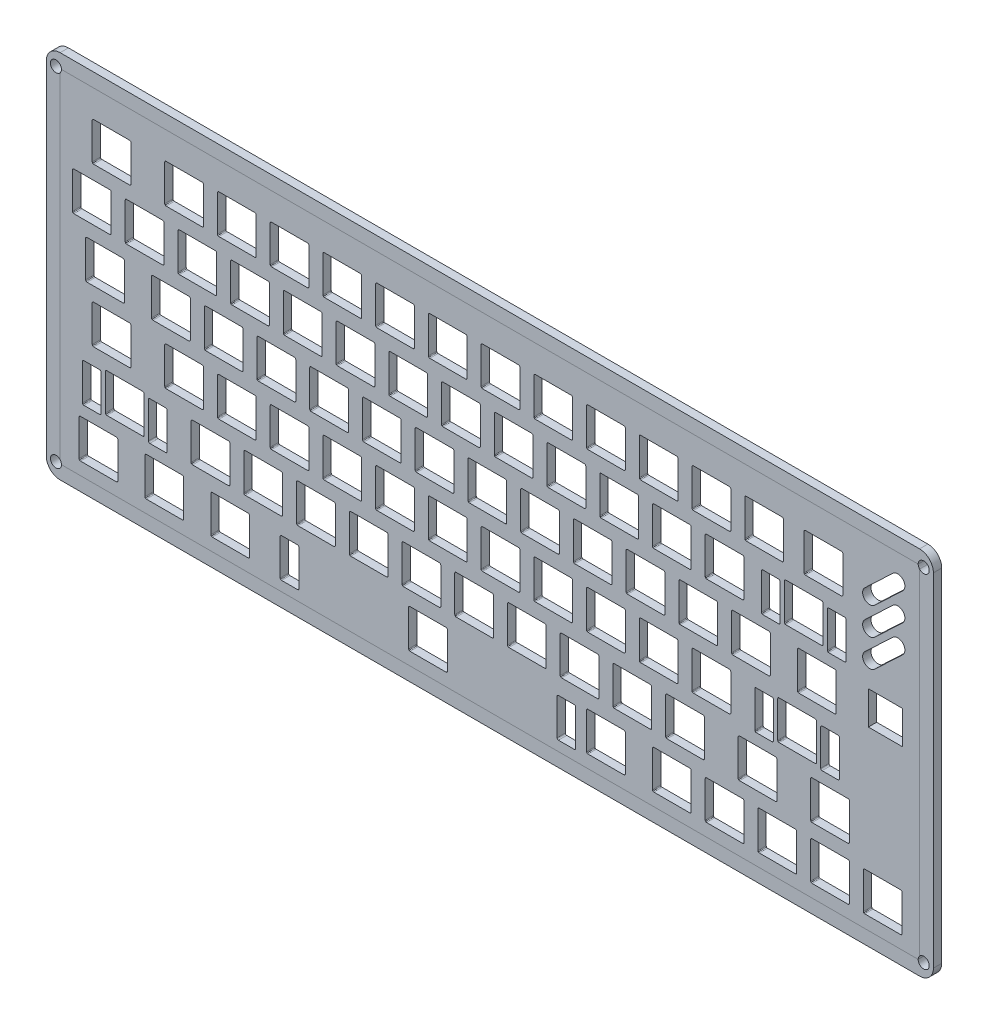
SolidWorks part; units mm, degrees
ref_plane "Front Plane" through (0, 0, 0) normal (0, 0, 1) x (1, 0, 0)
ref_plane "Top Plane" through (0, 0, 0) normal (0, 1, 0) x (1, 0, 0)
ref_plane "Right Plane" through (0, 0, 0) normal (1, 0, 0) x (0, 0, -1)
sketch "Sketch8" plane through (0, 0, 0) normal (0, 0, 1) x (1, 0, 0)
  line L0 (383.989, 18.5) -> (383.989, 12)
  line L1 (311.5, 227.7522) -> (323.75, 227.7522)
  line L2 (323.75, 227.7522) -> (323.75, 215.7522)
  line L3 (323.75, 215.7522) -> (311.5, 215.7522)
  line L4 (311.5, 215.7522) -> (311.5, 227.7522)
  line L5 (295.1313, 246.3522) -> (295.1313, 233.3522)
  line L6 (294.6313, 232.8522) -> (281.6313, 232.8522)
  line L7 (281.6313, 246.8522) -> (294.6313, 246.8522)
  line L8 (281.1313, 233.3522) -> (281.1313, 246.3522)
  line L9 (95.3938, 252.4022) -> (95.3938, 265.4022)
  line L10 (95.8938, 265.9022) -> (108.8938, 265.9022)
  line L11 (108.8938, 251.9022) -> (95.8938, 251.9022)
  line L12 (109.3938, 265.4022) -> (109.3938, 252.4022)
  line L13 (143.0188, 176.2022) -> (143.0188, 189.2022)
  line L14 (143.5188, 189.7022) -> (156.5188, 189.7022)
  line L15 (156.5188, 175.7022) -> (143.5188, 175.7022)
  line L16 (157.0188, 189.2022) -> (157.0188, 176.2022)
  line L17 (76.3438, 252.4022) -> (76.3438, 265.4022)
  line L18 (76.8438, 265.9022) -> (89.8438, 265.9022)
  line L19 (89.8438, 251.9022) -> (76.8438, 251.9022)
  line L20 (90.3438, 265.4022) -> (90.3438, 252.4022)
  line L21 (247.7938, 252.4022) -> (247.7938, 265.4022)
  line L22 (248.2938, 265.9022) -> (261.2938, 265.9022)
  line L23 (261.2938, 251.9022) -> (248.2938, 251.9022)
  line L24 (261.7938, 265.4022) -> (261.7938, 252.4022)
  line L25 (171.5938, 252.4022) -> (171.5938, 265.4022)
  line L26 (172.0938, 265.9022) -> (185.0938, 265.9022)
  line L27 (185.0938, 251.9022) -> (172.0938, 251.9022)
  line L28 (185.5938, 265.4022) -> (185.5938, 252.4022)
  line L29 (31.1, 195.2522) -> (31.1, 208.2522)
  line L30 (31.6, 208.7522) -> (44.6, 208.7522)
  line L31 (44.6, 194.7522) -> (31.6, 194.7522)
  line L32 (45.1, 208.2522) -> (45.1, 195.2522)
  line L33 (290.6563, 176.2022) -> (290.6563, 189.2022)
  line L34 (291.1563, 189.7022) -> (304.1563, 189.7022)
  line L35 (304.1563, 175.7022) -> (291.1563, 175.7022)
  line L36 (304.6563, 189.2022) -> (304.6563, 176.2022)
  line L37 (90.6313, 214.3022) -> (90.6313, 227.3022)
  line L38 (91.1313, 227.8022) -> (104.1313, 227.8022)
  line L39 (104.1313, 213.8022) -> (91.1313, 213.8022)
  line L40 (104.6313, 227.3022) -> (104.6313, 214.3022)
  line L41 (247.7938, 195.2522) -> (247.7938, 208.2522)
  line L42 (248.2938, 208.7522) -> (261.2938, 208.7522)
  line L43 (261.2938, 194.7522) -> (248.2938, 194.7522)
  line L44 (261.7938, 208.2522) -> (261.7938, 195.2522)
  line L45 (28.7188, 214.3022) -> (28.7188, 227.3022)
  line L46 (29.2188, 227.8022) -> (42.2188, 227.8022)
  line L47 (42.2188, 213.8022) -> (29.2188, 213.8022)
  line L48 (42.7188, 227.3022) -> (42.7188, 214.3022)
  line L49 (190.6438, 195.2522) -> (190.6438, 208.2522)
  line L50 (191.1438, 208.7522) -> (204.1438, 208.7522)
  line L51 (204.1438, 194.7522) -> (191.1438, 194.7522)
  line L52 (204.6438, 208.2522) -> (204.6438, 195.2522)
  line L53 (288.275, 252.4022) -> (288.275, 265.4022)
  line L54 (288.775, 265.9022) -> (301.775, 265.9022)
  line L55 (301.775, 251.9022) -> (288.775, 251.9022)
  line L56 (302.275, 265.4022) -> (302.275, 252.4022)
  line L57 (133.4938, 195.2522) -> (133.4938, 208.2522)
  line L58 (133.9938, 208.7522) -> (146.9938, 208.7522)
  line L59 (146.9938, 194.7522) -> (133.9938, 194.7522)
  line L60 (147.4938, 208.2522) -> (147.4938, 195.2522)
  line L61 (285.8938, 214.3022) -> (285.8938, 227.3022)
  line L62 (286.3938, 227.8022) -> (299.3938, 227.8022)
  line L63 (299.3938, 213.8022) -> (286.3938, 213.8022)
  line L64 (299.8938, 227.3022) -> (299.8938, 214.3022)
  line L65 (43.0063, 233.3522) -> (43.0063, 246.3522)
  line L66 (43.5063, 246.8522) -> (56.5063, 246.8522)
  line L67 (56.5063, 232.8522) -> (43.5063, 232.8522)
  line L68 (57.0063, 246.3522) -> (57.0063, 233.3522)
  line L69 (228.7438, 195.2522) -> (228.7438, 208.2522)
  line L70 (229.2438, 208.7522) -> (242.2438, 208.7522)
  line L71 (242.2438, 194.7522) -> (229.2438, 194.7522)
  line L72 (242.7438, 208.2522) -> (242.7438, 195.2522)
  line L73 (57.2938, 195.2522) -> (57.2938, 208.2522)
  line L74 (57.7938, 208.7522) -> (70.7938, 208.7522)
  line L75 (70.7938, 194.7522) -> (57.7938, 194.7522)
  line L76 (71.2938, 208.2522) -> (71.2938, 195.2522)
  line L77 (176.3563, 233.3522) -> (176.3563, 246.3522)
  line L78 (176.8563, 246.8522) -> (189.8563, 246.8522)
  line L79 (189.8563, 232.8522) -> (176.8563, 232.8522)
  line L80 (190.3563, 246.3522) -> (190.3563, 233.3522)
  line L81 (145.4, 157.1522) -> (145.4, 170.1522)
  line L82 (145.9, 170.6522) -> (158.9, 170.6522)
  line L83 (158.9, 156.6522) -> (145.9, 156.6522)
  line L84 (159.4, 170.1522) -> (159.4, 157.1522)
  line L85 (278.75, 195.2522) -> (278.75, 208.2522)
  line L86 (279.25, 208.7522) -> (292.25, 208.7522)
  line L87 (292.25, 194.7522) -> (279.25, 194.7522)
  line L88 (292.75, 208.2522) -> (292.75, 195.2522)
  line L89 (104.9188, 176.2022) -> (104.9188, 189.2022)
  line L90 (105.4188, 189.7022) -> (118.4188, 189.7022)
  line L91 (118.4188, 175.7022) -> (105.4188, 175.7022)
  line L92 (118.9188, 189.2022) -> (118.9188, 176.2022)
  line L93 (26.3375, 157.1522) -> (26.3375, 170.1522)
  line L94 (26.8375, 170.6522) -> (39.8375, 170.6522)
  line L95 (39.8375, 156.6522) -> (26.8375, 156.6522)
  line L96 (40.3375, 170.1522) -> (40.3375, 157.1522)
  line L97 (128.7313, 214.3022) -> (128.7313, 227.3022)
  line L98 (129.2313, 227.8022) -> (142.2313, 227.8022)
  line L99 (142.2313, 213.8022) -> (129.2313, 213.8022)
  line L100 (142.7313, 227.3022) -> (142.7313, 214.3022)
  line L101 (114.4438, 252.4022) -> (114.4438, 265.4022)
  line L102 (114.9438, 265.9022) -> (127.9438, 265.9022)
  line L103 (127.9438, 251.9022) -> (114.9438, 251.9022)
  line L104 (128.4438, 265.4022) -> (128.4438, 252.4022)
  line L105 (238.2688, 176.2022) -> (238.2688, 189.2022)
  line L106 (238.7688, 189.7022) -> (251.7688, 189.7022)
  line L107 (251.7688, 175.7022) -> (238.7688, 175.7022)
  line L108 (252.2688, 189.2022) -> (252.2688, 176.2022)
  line L109 (35.8625, 176.2022) -> (35.8625, 189.2022)
  line L110 (36.3625, 189.7022) -> (49.3625, 189.7022)
  line L111 (49.3625, 175.7022) -> (36.3625, 175.7022)
  line L112 (49.8625, 189.2022) -> (49.8625, 176.2022)
  line L113 (133.4938, 252.4022) -> (133.4938, 265.4022)
  line L114 (133.9938, 265.9022) -> (146.9938, 265.9022)
  line L115 (146.9938, 251.9022) -> (133.9938, 251.9022)
  line L116 (147.4938, 265.4022) -> (147.4938, 252.4022)
  line L117 (81.1063, 233.3522) -> (81.1063, 246.3522)
  line L118 (81.6063, 246.8522) -> (94.6063, 246.8522)
  line L119 (94.6063, 232.8522) -> (81.6063, 232.8522)
  line L120 (95.1063, 246.3522) -> (95.1063, 233.3522)
  line L121 (233.5063, 157.1522) -> (233.5063, 170.1522)
  line L122 (234.0063, 170.6522) -> (247.0063, 170.6522)
  line L123 (247.0063, 156.6522) -> (234.0063, 156.6522)
  line L124 (247.5063, 170.1522) -> (247.5063, 157.1522)
  line L125 (252.5563, 233.3522) -> (252.5563, 246.3522)
  line L126 (253.0563, 246.8522) -> (266.0563, 246.8522)
  line L127 (266.0563, 232.8522) -> (253.0563, 232.8522)
  line L128 (266.5563, 246.3522) -> (266.5563, 233.3522)
  line L129 (57.2938, 252.4022) -> (57.2938, 265.4022)
  line L130 (57.7938, 265.9022) -> (70.7938, 265.9022)
  line L131 (70.7938, 251.9022) -> (57.7938, 251.9022)
  line L132 (71.2938, 265.4022) -> (71.2938, 252.4022)
  line L133 (233.5063, 233.3522) -> (233.5063, 246.3522)
  line L134 (234.0063, 246.8522) -> (247.0063, 246.8522)
  line L135 (247.0063, 232.8522) -> (234.0063, 232.8522)
  line L136 (247.5063, 246.3522) -> (247.5063, 233.3522)
  line L137 (264.4625, 176.2022) -> (264.4625, 189.2022)
  line L138 (264.9625, 189.7022) -> (277.9625, 189.7022)
  line L139 (277.9625, 175.7022) -> (264.9625, 175.7022)
  line L140 (278.4625, 189.2022) -> (278.4625, 176.2022)
  line L141 (200.1688, 176.2022) -> (200.1688, 189.2022)
  line L142 (200.6688, 189.7022) -> (213.6688, 189.7022)
  line L143 (213.6688, 175.7022) -> (200.6688, 175.7022)
  line L144 (214.1688, 189.2022) -> (214.1688, 176.2022)
  line L145 (290.6563, 157.1522) -> (290.6563, 170.1522)
  line L146 (291.1563, 170.6522) -> (304.1563, 170.6522)
  line L147 (304.1563, 156.6522) -> (291.1563, 156.6522)
  line L148 (304.6563, 170.1522) -> (304.6563, 157.1522)
  line L149 (195.4063, 233.3522) -> (195.4063, 246.3522)
  line L150 (195.9063, 246.8522) -> (208.9063, 246.8522)
  line L151 (208.9063, 232.8522) -> (195.9063, 232.8522)
  line L152 (209.4063, 246.3522) -> (209.4063, 233.3522)
  line L153 (243.0313, 214.3022) -> (243.0313, 227.3022)
  line L154 (243.5313, 227.8022) -> (256.5313, 227.8022)
  line L155 (256.5313, 213.8022) -> (243.5313, 213.8022)
  line L156 (257.0313, 227.3022) -> (257.0313, 214.3022)
  line L157 (62.0563, 233.3522) -> (62.0563, 246.3522)
  line L158 (62.5563, 246.8522) -> (75.5563, 246.8522)
  line L159 (75.5563, 232.8522) -> (62.5563, 232.8522)
  line L160 (76.0563, 246.3522) -> (76.0563, 233.3522)
  line L161 (119.2063, 233.3522) -> (119.2063, 246.3522)
  line L162 (119.7063, 246.8522) -> (132.7063, 246.8522)
  line L163 (132.7063, 232.8522) -> (119.7063, 232.8522)
  line L164 (133.2063, 246.3522) -> (133.2063, 233.3522)
  line L165 (52.5313, 214.3022) -> (52.5313, 227.3022)
  line L166 (53.0313, 227.8022) -> (66.0313, 227.8022)
  line L167 (66.0313, 213.8022) -> (53.0313, 213.8022)
  line L168 (66.5313, 227.3022) -> (66.5313, 214.3022)
  line L169 (85.8688, 176.2022) -> (85.8688, 189.2022)
  line L170 (86.3688, 189.7022) -> (99.3688, 189.7022)
  line L171 (99.3688, 175.7022) -> (86.3688, 175.7022)
  line L172 (99.8688, 189.2022) -> (99.8688, 176.2022)
  line L173 (223.9813, 214.3022) -> (223.9813, 227.3022)
  line L174 (224.4813, 227.8022) -> (237.4813, 227.8022)
  line L175 (237.4813, 213.8022) -> (224.4813, 213.8022)
  line L176 (237.9813, 227.3022) -> (237.9813, 214.3022)
  line L177 (190.6438, 252.4022) -> (190.6438, 265.4022)
  line L178 (191.1438, 265.9022) -> (204.1438, 265.9022)
  line L179 (204.1438, 251.9022) -> (191.1438, 251.9022)
  line L180 (204.6438, 265.4022) -> (204.6438, 252.4022)
  line L181 (204.9313, 214.3022) -> (204.9313, 227.3022)
  line L182 (205.4313, 227.8022) -> (218.4313, 227.8022)
  line L183 (218.4313, 213.8022) -> (205.4313, 213.8022)
  line L184 (218.9313, 227.3022) -> (218.9313, 214.3022)
  line L185 (181.1188, 176.2022) -> (181.1188, 189.2022)
  line L186 (181.6188, 189.7022) -> (194.6188, 189.7022)
  line L187 (194.6188, 175.7022) -> (181.6188, 175.7022)
  line L188 (195.1188, 189.2022) -> (195.1188, 176.2022)
  line L189 (171.5938, 195.2522) -> (171.5938, 208.2522)
  line L190 (172.0938, 208.7522) -> (185.0938, 208.7522)
  line L191 (185.0938, 194.7522) -> (172.0938, 194.7522)
  line L192 (185.5938, 208.2522) -> (185.5938, 195.2522)
  line L193 (162.0688, 176.2022) -> (162.0688, 189.2022)
  line L194 (162.5688, 189.7022) -> (175.5688, 189.7022)
  line L195 (175.5688, 175.7022) -> (162.5688, 175.7022)
  line L196 (176.0688, 189.2022) -> (176.0688, 176.2022)
  line L197 (50.15, 157.1522) -> (50.15, 170.1522)
  line L198 (50.65, 170.6522) -> (63.65, 170.6522)
  line L199 (63.65, 156.6522) -> (50.65, 156.6522)
  line L200 (64.15, 170.1522) -> (64.15, 157.1522)
  line L201 (185.8813, 214.3022) -> (185.8813, 227.3022)
  line L202 (186.3813, 227.8022) -> (199.3813, 227.8022)
  line L203 (199.3813, 213.8022) -> (186.3813, 213.8022)
  line L204 (199.8813, 227.3022) -> (199.8813, 214.3022)
  line L205 (228.7438, 252.4022) -> (228.7438, 265.4022)
  line L206 (229.2438, 265.9022) -> (242.2438, 265.9022)
  line L207 (242.2438, 251.9022) -> (229.2438, 251.9022)
  line L208 (242.7438, 265.4022) -> (242.7438, 252.4022)
  line L209 (100.1563, 233.3522) -> (100.1563, 246.3522)
  line L210 (100.6563, 246.8522) -> (113.6563, 246.8522)
  line L211 (113.6563, 232.8522) -> (100.6563, 232.8522)
  line L212 (114.1563, 246.3522) -> (114.1563, 233.3522)
  line L213 (138.2563, 233.3522) -> (138.2563, 246.3522)
  line L214 (138.7563, 246.8522) -> (151.7563, 246.8522)
  line L215 (151.7563, 232.8522) -> (138.7563, 232.8522)
  line L216 (152.2563, 246.3522) -> (152.2563, 233.3522)
  line L217 (23.9563, 233.3522) -> (23.9563, 246.3522)
  line L218 (24.4563, 246.8522) -> (37.4563, 246.8522)
  line L219 (37.4563, 232.8522) -> (24.4563, 232.8522)
  line L220 (37.9563, 246.3522) -> (37.9563, 233.3522)
  line L221 (262.0813, 214.3022) -> (262.0813, 227.3022)
  line L222 (262.5813, 227.8022) -> (275.5813, 227.8022)
  line L223 (275.5813, 213.8022) -> (262.5813, 213.8022)
  line L224 (276.0813, 227.3022) -> (276.0813, 214.3022)
  line L225 (152.5438, 195.2522) -> (152.5438, 208.2522)
  line L226 (153.0438, 208.7522) -> (166.0438, 208.7522)
  line L227 (166.0438, 194.7522) -> (153.0438, 194.7522)
  line L228 (166.5438, 208.2522) -> (166.5438, 195.2522)
  line L229 (95.3938, 195.2522) -> (95.3938, 208.2522)
  line L230 (95.8938, 208.7522) -> (108.8938, 208.7522)
  line L231 (108.8938, 194.7522) -> (95.8938, 194.7522)
  line L232 (109.3938, 208.2522) -> (109.3938, 195.2522)
  line L233 (209.6938, 252.4022) -> (209.6938, 265.4022)
  line L234 (210.1938, 265.9022) -> (223.1938, 265.9022)
  line L235 (223.1938, 251.9022) -> (210.1938, 251.9022)
  line L236 (223.6938, 265.4022) -> (223.6938, 252.4022)
  line L237 (152.5438, 252.4022) -> (152.5438, 265.4022)
  line L238 (153.0438, 265.9022) -> (166.0438, 265.9022)
  line L239 (166.0438, 251.9022) -> (153.0438, 251.9022)
  line L240 (166.5438, 265.4022) -> (166.5438, 252.4022)
  line L241 (209.6938, 157.1522) -> (209.6938, 170.1522)
  line L242 (210.1938, 170.6522) -> (223.1938, 170.6522)
  line L243 (223.1938, 156.6522) -> (210.1938, 156.6522)
  line L244 (223.6938, 170.1522) -> (223.6938, 157.1522)
  line L245 (71.5813, 214.3022) -> (71.5813, 227.3022)
  line L246 (72.0813, 227.8022) -> (85.0813, 227.8022)
  line L247 (85.0813, 213.8022) -> (72.0813, 213.8022)
  line L248 (85.5813, 227.3022) -> (85.5813, 214.3022)
  line L249 (123.9688, 176.2022) -> (123.9688, 189.2022)
  line L250 (124.4688, 189.7022) -> (137.4688, 189.7022)
  line L251 (137.4688, 175.7022) -> (124.4688, 175.7022)
  line L252 (137.9688, 189.2022) -> (137.9688, 176.2022)
  line L253 (147.7813, 214.3022) -> (147.7813, 227.3022)
  line L254 (148.2813, 227.8022) -> (161.2813, 227.8022)
  line L255 (161.2813, 213.8022) -> (148.2813, 213.8022)
  line L256 (161.7813, 227.3022) -> (161.7813, 214.3022)
  line L257 (109.6813, 214.3022) -> (109.6813, 227.3022)
  line L258 (110.1813, 227.8022) -> (123.1813, 227.8022)
  line L259 (123.1813, 213.8022) -> (110.1813, 213.8022)
  line L260 (123.6813, 227.3022) -> (123.6813, 214.3022)
  line L261 (209.6938, 195.2522) -> (209.6938, 208.2522)
  line L262 (210.1938, 208.7522) -> (223.1938, 208.7522)
  line L263 (223.1938, 194.7522) -> (210.1938, 194.7522)
  line L264 (223.6938, 208.2522) -> (223.6938, 195.2522)
  line L265 (266.8438, 252.4022) -> (266.8438, 265.4022)
  line L266 (267.3438, 265.9022) -> (280.3438, 265.9022)
  line L267 (280.3438, 251.9022) -> (267.3438, 251.9022)
  line L268 (280.8438, 265.4022) -> (280.8438, 252.4022)
  line L269 (309.7063, 157.1522) -> (309.7063, 170.1522)
  line L270 (310.2063, 170.6522) -> (323.2063, 170.6522)
  line L271 (323.2063, 156.6522) -> (310.2063, 156.6522)
  line L272 (323.7063, 170.1522) -> (323.7063, 157.1522)
  line L273 (219.2188, 176.2022) -> (219.2188, 189.2022)
  line L274 (219.7188, 189.7022) -> (232.7188, 189.7022)
  line L275 (232.7188, 175.7022) -> (219.7188, 175.7022)
  line L276 (233.2188, 189.2022) -> (233.2188, 176.2022)
  line L277 (76.3438, 195.2522) -> (76.3438, 208.2522)
  line L278 (76.8438, 208.7522) -> (89.8438, 208.7522)
  line L279 (89.8438, 194.7522) -> (76.8438, 194.7522)
  line L280 (90.3438, 208.2522) -> (90.3438, 195.2522)
  line L281 (73.9625, 157.1522) -> (73.9625, 170.1522)
  line L282 (74.4625, 170.6522) -> (87.4625, 170.6522)
  line L283 (87.4625, 156.6522) -> (74.4625, 156.6522)
  line L284 (87.9625, 170.1522) -> (87.9625, 157.1522)
  line L285 (214.4563, 233.3522) -> (214.4563, 246.3522)
  line L286 (214.9563, 246.8522) -> (227.9563, 246.8522)
  line L287 (227.9563, 232.8522) -> (214.9563, 232.8522)
  line L288 (228.4563, 246.3522) -> (228.4563, 233.3522)
  line L289 (166.8313, 214.3022) -> (166.8313, 227.3022)
  line L290 (167.3313, 227.8022) -> (180.3313, 227.8022)
  line L291 (180.3313, 213.8022) -> (167.3313, 213.8022)
  line L292 (180.8313, 227.3022) -> (180.8313, 214.3022)
  line L293 (252.5563, 157.1522) -> (252.5563, 170.1522)
  line L294 (253.0563, 170.6522) -> (266.0563, 170.6522)
  line L295 (266.0563, 156.6522) -> (253.0563, 156.6522)
  line L296 (266.5563, 170.1522) -> (266.5563, 157.1522)
  line L297 (114.4438, 195.2522) -> (114.4438, 208.2522)
  line L298 (114.9438, 208.7522) -> (127.9438, 208.7522)
  line L299 (127.9438, 194.7522) -> (114.9438, 194.7522)
  line L300 (128.4438, 208.2522) -> (128.4438, 195.2522)
  line L301 (271.6063, 157.1522) -> (271.6063, 170.1522)
  line L302 (272.1063, 170.6522) -> (285.1063, 170.6522)
  line L303 (285.1063, 156.6522) -> (272.1063, 156.6522)
  line L304 (285.6063, 170.1522) -> (285.6063, 157.1522)
  line L305 (31.1, 252.4022) -> (31.1, 265.4022)
  line L306 (31.6, 265.9022) -> (44.6, 265.9022)
  line L307 (44.6, 251.9022) -> (31.6, 251.9022)
  line L308 (45.1, 265.4022) -> (45.1, 252.4022)
  line L309 (66.8188, 176.2022) -> (66.8188, 189.2022)
  line L310 (67.3188, 189.7022) -> (80.3188, 189.7022)
  line L311 (80.3188, 175.7022) -> (67.3188, 175.7022)
  line L312 (80.8188, 189.2022) -> (80.8188, 176.2022)
  line L313 (157.3063, 233.3522) -> (157.3063, 246.3522)
  line L314 (157.8063, 246.8522) -> (170.8063, 246.8522)
  line L315 (170.8063, 232.8522) -> (157.8063, 232.8522)
  line L316 (171.3063, 246.3522) -> (171.3063, 233.3522)
  line L317 (19.5, 275.7522) -> (19.5, 152.0772)
  line L318 (330, 275.7522) -> (330, 152.0772)
  line L319 (330, 152.0772) -> (20, 152.0772)
  line L320 (19.5, 275.7522) -> (330, 275.7522)
  line L321 (19.5, 152.0772) -> (20, 152.0772)
  line L322 (99.0187, 169.1522) -> (99.0187, 156.1522)
  line L323 (99.5187, 169.6522) -> (105.2687, 169.6522)
  line L324 (99.5187, 155.6522) -> (105.2687, 155.6522)
  line L325 (105.7687, 169.1522) -> (105.7687, 156.1522)
  line L326 (145.4, 170.1522) -> (145.4, 157.1522)
  line L327 (145.9, 156.6522) -> (158.9, 156.6522)
  line L328 (158.9, 170.6522) -> (145.9, 170.6522)
  line L329 (159.4, 157.1522) -> (159.4, 170.1522)
  line L330 (199.0319, 169.1522) -> (199.0319, 156.1522)
  line L331 (199.5319, 169.6522) -> (205.2806, 169.6522)
  line L332 (199.5319, 155.6522) -> (205.2819, 155.6522)
  line L333 (205.7807, 169.1522) -> (205.7819, 156.1522)
  line L334 (27.5812, 188.2022) -> (27.5812, 175.2022)
  line L335 (28.0812, 188.7022) -> (33.8312, 188.7022)
  line L336 (28.0812, 174.7022) -> (33.8312, 174.7022)
  line L337 (34.3312, 188.2022) -> (34.3312, 175.2022)
  line L338 (35.8625, 189.2022) -> (35.8625, 176.2022)
  line L339 (36.3625, 175.7022) -> (49.3625, 175.7022)
  line L340 (49.3625, 189.7022) -> (36.3625, 189.7022)
  line L341 (49.8625, 176.2022) -> (49.8625, 189.2022)
  line L342 (51.3937, 188.2022) -> (51.3937, 175.2022)
  line L343 (51.8937, 188.7022) -> (57.6425, 188.7022)
  line L344 (51.8937, 174.7022) -> (57.6437, 174.7022)
  line L345 (58.1425, 188.2022) -> (58.1437, 175.2022)
  line L346 (272.8501, 245.3522) -> (272.8501, 232.3522)
  line L347 (273.3501, 245.8522) -> (279.1001, 245.8522)
  line L348 (273.3501, 231.8522) -> (279.1001, 231.8522)
  line L349 (279.6001, 245.3522) -> (279.6001, 232.3522)
  line L350 (281.1313, 246.3522) -> (281.1313, 233.3522)
  line L351 (281.6313, 232.8522) -> (294.6313, 232.8522)
  line L352 (294.6313, 246.8522) -> (281.6313, 246.8522)
  line L353 (295.1313, 233.3522) -> (295.1313, 246.3522)
  line L354 (296.6626, 245.3522) -> (296.6626, 232.3522)
  line L355 (297.1626, 245.8522) -> (302.9113, 245.8522)
  line L356 (297.1626, 231.8522) -> (302.9126, 231.8522)
  line L357 (303.4113, 245.3522) -> (303.4125, 232.3522)
  line L358 (270.4688, 207.2522) -> (270.4688, 194.2522)
  line L359 (270.9688, 207.7522) -> (276.7188, 207.7522)
  line L360 (270.9688, 193.7522) -> (276.7188, 193.7522)
  line L361 (277.2188, 207.2522) -> (277.2188, 194.2522)
  line L362 (278.75, 208.2522) -> (278.75, 195.2522)
  line L363 (279.25, 194.7522) -> (292.25, 194.7522)
  line L364 (292.25, 208.7522) -> (279.25, 208.7522)
  line L365 (292.75, 195.2522) -> (292.75, 208.2522)
  line L366 (294.2812, 207.2522) -> (294.2812, 194.2522)
  line L367 (294.7812, 207.7522) -> (300.53, 207.7522)
  line L368 (294.7812, 193.7522) -> (300.5312, 193.7522)
  line L369 (301.03, 207.2522) -> (301.0312, 194.2522)
  line L370 (163.5063, 246.4522) -> (163.5063, 243.5522)
  line L371 (163.5063, 243.5522) -> (166.8063, 243.5522)
  line L372 (166.8063, 246.4522) -> (163.5063, 246.4522)
  line L373 (166.8063, 243.5522) -> (166.8063, 246.4522)
  line L374 (144.4563, 246.4522) -> (144.4563, 243.5522)
  line L375 (144.4563, 243.5522) -> (147.7563, 243.5522)
  line L376 (147.7563, 246.4522) -> (144.4563, 246.4522)
  line L377 (147.7563, 243.5522) -> (147.7563, 246.4522)
  line L378 (215.8938, 265.5022) -> (215.8938, 262.6022)
  line L379 (215.8938, 262.6022) -> (219.1938, 262.6022)
  line L380 (219.1938, 265.5022) -> (215.8938, 265.5022)
  line L381 (219.1938, 262.6022) -> (219.1938, 265.5022)
  line L382 (177.7938, 265.5022) -> (177.7938, 262.6022)
  line L383 (177.7938, 262.6022) -> (181.0938, 262.6022)
  line L384 (181.0938, 265.5022) -> (177.7938, 265.5022)
  line L385 (181.0938, 262.6022) -> (181.0938, 265.5022)
  line L386 (234.9438, 265.5022) -> (234.9438, 262.6022)
  line L387 (234.9438, 262.6022) -> (238.2438, 262.6022)
  line L388 (238.2438, 265.5022) -> (234.9438, 265.5022)
  line L389 (238.2438, 262.6022) -> (238.2438, 265.5022)
  line L390 (220.6563, 246.4522) -> (220.6563, 243.5522)
  line L391 (220.6563, 243.5522) -> (223.9563, 243.5522)
  line L392 (223.9563, 246.4522) -> (220.6563, 246.4522)
  line L393 (223.9563, 243.5522) -> (223.9563, 246.4522)
  line L394 (270.6625, 189.3022) -> (270.6625, 186.4022)
  line L395 (270.6625, 186.4022) -> (273.9625, 186.4022)
  line L396 (273.9625, 189.3022) -> (270.6625, 189.3022)
  line L397 (273.9625, 186.4022) -> (273.9625, 189.3022)
  line L398 (158.7438, 208.3522) -> (158.7438, 205.4522)
  line L399 (158.7438, 205.4522) -> (162.0438, 205.4522)
  line L400 (162.0438, 208.3522) -> (158.7438, 208.3522)
  line L401 (162.0438, 205.4522) -> (162.0438, 208.3522)
  line L402 (134.9313, 227.4022) -> (134.9313, 224.5022)
  line L403 (134.9313, 224.5022) -> (138.2313, 224.5022)
  line L404 (138.2313, 227.4022) -> (134.9313, 227.4022)
  line L405 (138.2313, 224.5022) -> (138.2313, 227.4022)
  line L406 (42.0625, 189.3022) -> (42.0625, 186.4022)
  line L407 (42.0625, 186.4022) -> (45.3625, 186.4022)
  line L408 (45.3625, 189.3022) -> (42.0625, 189.3022)
  line L409 (45.3625, 186.4022) -> (45.3625, 189.3022)
  line L410 (292.0938, 227.4022) -> (292.0938, 224.5022)
  line L411 (292.0938, 224.5022) -> (295.3938, 224.5022)
  line L412 (295.3938, 227.4022) -> (292.0938, 227.4022)
  line L413 (295.3938, 224.5022) -> (295.3938, 227.4022)
  line L414 (253.9938, 208.3522) -> (253.9938, 205.4522)
  line L415 (253.9938, 205.4522) -> (257.2938, 205.4522)
  line L416 (257.2938, 208.3522) -> (253.9938, 208.3522)
  line L417 (257.2938, 205.4522) -> (257.2938, 208.3522)
  line L418 (87.3063, 246.4522) -> (87.3063, 243.5522)
  line L419 (87.3063, 243.5522) -> (90.6063, 243.5522)
  line L420 (90.6063, 246.4522) -> (87.3063, 246.4522)
  line L421 (90.6063, 243.5522) -> (90.6063, 246.4522)
  line L422 (139.6938, 208.3522) -> (139.6938, 205.4522)
  line L423 (139.6938, 205.4522) -> (142.9938, 205.4522)
  line L424 (142.9938, 208.3522) -> (139.6938, 208.3522)
  line L425 (142.9938, 205.4522) -> (142.9938, 208.3522)
  line L426 (296.8563, 170.2522) -> (296.8563, 167.3522)
  line L427 (296.8563, 167.3522) -> (300.1563, 167.3522)
  line L428 (300.1563, 170.2522) -> (296.8563, 170.2522)
  line L429 (300.1563, 167.3522) -> (300.1563, 170.2522)
  line L430 (101.35, 265.4522) -> (101.35, 262.5522)
  line L431 (101.35, 262.5522) -> (104.65, 262.5522)
  line L432 (104.65, 265.4522) -> (101.35, 265.4522)
  line L433 (104.65, 262.5522) -> (104.65, 265.4522)
  line L434 (239.7063, 170.2522) -> (239.7063, 167.3522)
  line L435 (239.7063, 167.3522) -> (243.0063, 167.3522)
  line L436 (243.0063, 170.2522) -> (239.7063, 170.2522)
  line L437 (243.0063, 167.3522) -> (243.0063, 170.2522)
  line L438 (249.2313, 227.4022) -> (249.2313, 224.5022)
  line L439 (249.2313, 224.5022) -> (252.5313, 224.5022)
  line L440 (252.5313, 227.4022) -> (249.2313, 227.4022)
  line L441 (252.5313, 224.5022) -> (252.5313, 227.4022)
  line L442 (315.9063, 170.2522) -> (315.9063, 167.3522)
  line L443 (315.9063, 167.3522) -> (319.2063, 167.3522)
  line L444 (319.2063, 170.2522) -> (315.9063, 170.2522)
  line L445 (319.2063, 167.3522) -> (319.2063, 170.2522)
  line L446 (125.4063, 246.4522) -> (125.4063, 243.5522)
  line L447 (125.4063, 243.5522) -> (128.7063, 243.5522)
  line L448 (128.7063, 246.4522) -> (125.4063, 246.4522)
  line L449 (128.7063, 243.5522) -> (128.7063, 246.4522)
  line L450 (49.2063, 246.4522) -> (49.2063, 243.5522)
  line L451 (49.2063, 243.5522) -> (52.5063, 243.5522)
  line L452 (52.5063, 246.4522) -> (49.2063, 246.4522)
  line L453 (52.5063, 243.5522) -> (52.5063, 246.4522)
  line L454 (32.5375, 170.2522) -> (32.5375, 167.3522)
  line L455 (32.5375, 167.3522) -> (35.8375, 167.3522)
  line L456 (35.8375, 170.2522) -> (32.5375, 170.2522)
  line L457 (35.8375, 167.3522) -> (35.8375, 170.2522)
  line L458 (187.3188, 189.3022) -> (187.3188, 186.4022)
  line L459 (187.3188, 186.4022) -> (190.6188, 186.4022)
  line L460 (190.6188, 189.3022) -> (187.3188, 189.3022)
  line L461 (190.6188, 186.4022) -> (190.6188, 189.3022)
  line L462 (68.2563, 246.4522) -> (68.2563, 243.5522)
  line L463 (68.2563, 243.5522) -> (71.5563, 243.5522)
  line L464 (71.5563, 246.4522) -> (68.2563, 246.4522)
  line L465 (71.5563, 243.5522) -> (71.5563, 246.4522)
  line L466 (30.1563, 246.4522) -> (30.1563, 243.5522)
  line L467 (30.1563, 243.5522) -> (33.4563, 243.5522)
  line L468 (33.4563, 246.4522) -> (30.1563, 246.4522)
  line L469 (33.4563, 243.5522) -> (33.4563, 246.4522)
  line L470 (34.9188, 227.4022) -> (34.9188, 224.5022)
  line L471 (34.9188, 224.5022) -> (38.2188, 224.5022)
  line L472 (38.2188, 227.4022) -> (34.9188, 227.4022)
  line L473 (38.2188, 224.5022) -> (38.2188, 227.4022)
  line L474 (153.9813, 227.4022) -> (153.9813, 224.5022)
  line L475 (153.9813, 224.5022) -> (157.2813, 224.5022)
  line L476 (157.2813, 227.4022) -> (153.9813, 227.4022)
  line L477 (157.2813, 224.5022) -> (157.2813, 227.4022)
  line L478 (196.8438, 265.5022) -> (196.8438, 262.6022)
  line L479 (196.8438, 262.6022) -> (200.1438, 262.6022)
  line L480 (200.1438, 265.5022) -> (196.8438, 265.5022)
  line L481 (200.1438, 262.6022) -> (200.1438, 265.5022)
  line L482 (82.5438, 208.3522) -> (82.5438, 205.4522)
  line L483 (82.5438, 205.4522) -> (85.8438, 205.4522)
  line L484 (85.8438, 208.3522) -> (82.5438, 208.3522)
  line L485 (85.8438, 205.4522) -> (85.8438, 208.3522)
  line L486 (151.6, 170.2522) -> (151.6, 167.3522)
  line L487 (151.6, 167.3522) -> (154.9, 167.3522)
  line L488 (154.9, 170.2522) -> (151.6, 170.2522)
  line L489 (154.9, 167.3522) -> (154.9, 170.2522)
  line L490 (63.4938, 208.3522) -> (63.4938, 205.4522)
  line L491 (63.4938, 205.4522) -> (66.7938, 205.4522)
  line L492 (66.7938, 208.3522) -> (63.4938, 208.3522)
  line L493 (66.7938, 205.4522) -> (66.7938, 208.3522)
  line L494 (225.4188, 189.3022) -> (225.4188, 186.4022)
  line L495 (225.4188, 186.4022) -> (228.7188, 186.4022)
  line L496 (228.7188, 189.3022) -> (225.4188, 189.3022)
  line L497 (228.7188, 186.4022) -> (228.7188, 189.3022)
  line L498 (206.3688, 189.3022) -> (206.3688, 186.4022)
  line L499 (206.3688, 186.4022) -> (209.6688, 186.4022)
  line L500 (209.6688, 189.3022) -> (206.3688, 189.3022)
  line L501 (209.6688, 186.4022) -> (209.6688, 189.3022)
  line L502 (37.3, 208.3522) -> (37.3, 205.4522)
  line L503 (37.3, 205.4522) -> (40.6, 205.4522)
  line L504 (40.6, 208.3522) -> (37.3, 208.3522)
  line L505 (40.6, 205.4522) -> (40.6, 208.3522)
  line L506 (244.4688, 189.3022) -> (244.4688, 186.4022)
  line L507 (244.4688, 186.4022) -> (247.7688, 186.4022)
  line L508 (247.7688, 189.3022) -> (244.4688, 189.3022)
  line L509 (247.7688, 186.4022) -> (247.7688, 189.3022)
  line L510 (215.8938, 208.3522) -> (215.8938, 205.4522)
  line L511 (215.8938, 205.4522) -> (219.1938, 205.4522)
  line L512 (219.1938, 208.3522) -> (215.8938, 208.3522)
  line L513 (219.1938, 205.4522) -> (219.1938, 208.3522)
  line L514 (296.8563, 189.3022) -> (296.8563, 186.4022)
  line L515 (296.8563, 186.4022) -> (300.1563, 186.4022)
  line L516 (300.1563, 189.3022) -> (296.8563, 189.3022)
  line L517 (300.1563, 186.4022) -> (300.1563, 189.3022)
  line L518 (111.1188, 189.3022) -> (111.1188, 186.4022)
  line L519 (111.1188, 186.4022) -> (114.4188, 186.4022)
  line L520 (114.4188, 189.3022) -> (111.1188, 189.3022)
  line L521 (114.4188, 186.4022) -> (114.4188, 189.3022)
  line L522 (77.7813, 227.4022) -> (77.7813, 224.5022)
  line L523 (77.7813, 224.5022) -> (81.0813, 224.5022)
  line L524 (81.0813, 227.4022) -> (77.7813, 227.4022)
  line L525 (81.0813, 224.5022) -> (81.0813, 227.4022)
  line L526 (239.7063, 246.4522) -> (239.7063, 243.5522)
  line L527 (239.7063, 243.5522) -> (243.0063, 243.5522)
  line L528 (243.0063, 246.4522) -> (239.7063, 246.4522)
  line L529 (243.0063, 243.5522) -> (243.0063, 246.4522)
  line L530 (130.1688, 189.3022) -> (130.1688, 186.4022)
  line L531 (130.1688, 186.4022) -> (133.4688, 186.4022)
  line L532 (133.4688, 189.3022) -> (130.1688, 189.3022)
  line L533 (133.4688, 186.4022) -> (133.4688, 189.3022)
  line L534 (294.475, 265.5022) -> (294.475, 262.6022)
  line L535 (294.475, 262.6022) -> (297.775, 262.6022)
  line L536 (297.775, 265.5022) -> (294.475, 265.5022)
  line L537 (297.775, 262.6022) -> (297.775, 265.5022)
  line L538 (80.1625, 170.2522) -> (80.1625, 167.3522)
  line L539 (80.1625, 167.3522) -> (83.4625, 167.3522)
  line L540 (83.4625, 170.2522) -> (80.1625, 170.2522)
  line L541 (83.4625, 167.3522) -> (83.4625, 170.2522)
  line L542 (139.35, 265.4522) -> (139.35, 262.5522)
  line L543 (139.35, 262.5522) -> (142.65, 262.5522)
  line L544 (142.65, 265.4522) -> (139.35, 265.4522)
  line L545 (142.65, 262.5522) -> (142.65, 265.4522)
  line L546 (230.1813, 227.4022) -> (230.1813, 224.5022)
  line L547 (230.1813, 224.5022) -> (233.4813, 224.5022)
  line L548 (233.4813, 227.4022) -> (230.1813, 227.4022)
  line L549 (233.4813, 224.5022) -> (233.4813, 227.4022)
  line L550 (58.7313, 227.4022) -> (58.7313, 224.5022)
  line L551 (58.7313, 224.5022) -> (62.0313, 224.5022)
  line L552 (62.0313, 227.4022) -> (58.7313, 227.4022)
  line L553 (62.0313, 224.5022) -> (62.0313, 227.4022)
  line L554 (273.0438, 265.5022) -> (273.0438, 262.6022)
  line L555 (273.0438, 262.6022) -> (276.3438, 262.6022)
  line L556 (276.3438, 265.5022) -> (273.0438, 265.5022)
  line L557 (276.3438, 262.6022) -> (276.3438, 265.5022)
  line L558 (253.9938, 265.5022) -> (253.9938, 262.6022)
  line L559 (253.9938, 262.6022) -> (257.2938, 262.6022)
  line L560 (257.2938, 265.5022) -> (253.9938, 265.5022)
  line L561 (257.2938, 262.6022) -> (257.2938, 265.5022)
  line L562 (182.5563, 246.4522) -> (182.5563, 243.5522)
  line L563 (182.5563, 243.5522) -> (185.8563, 243.5522)
  line L564 (185.8563, 246.4522) -> (182.5563, 246.4522)
  line L565 (185.8563, 243.5522) -> (185.8563, 246.4522)
  line L566 (92.0688, 189.3022) -> (92.0688, 186.4022)
  line L567 (92.0688, 186.4022) -> (95.3688, 186.4022)
  line L568 (95.3688, 189.3022) -> (92.0688, 189.3022)
  line L569 (95.3688, 186.4022) -> (95.3688, 189.3022)
  line L570 (106.3563, 246.4522) -> (106.3563, 243.5522)
  line L571 (106.3563, 243.5522) -> (109.6563, 243.5522)
  line L572 (109.6563, 246.4522) -> (106.3563, 246.4522)
  line L573 (109.6563, 243.5522) -> (109.6563, 246.4522)
  line L574 (120.6438, 208.3522) -> (120.6438, 205.4522)
  line L575 (120.6438, 205.4522) -> (123.9438, 205.4522)
  line L576 (123.9438, 208.3522) -> (120.6438, 208.3522)
  line L577 (123.9438, 205.4522) -> (123.9438, 208.3522)
  line L578 (192.0813, 227.4022) -> (192.0813, 224.5022)
  line L579 (192.0813, 224.5022) -> (195.3813, 224.5022)
  line L580 (195.3813, 227.4022) -> (192.0813, 227.4022)
  line L581 (195.3813, 224.5022) -> (195.3813, 227.4022)
  line L582 (234.9438, 208.3522) -> (234.9438, 205.4522)
  line L583 (234.9438, 205.4522) -> (238.2438, 205.4522)
  line L584 (238.2438, 208.3522) -> (234.9438, 208.3522)
  line L585 (238.2438, 205.4522) -> (238.2438, 208.3522)
  line L586 (277.8063, 170.2522) -> (277.8063, 167.3522)
  line L587 (277.8063, 167.3522) -> (281.1063, 167.3522)
  line L588 (281.1063, 170.2522) -> (277.8063, 170.2522)
  line L589 (281.1063, 167.3522) -> (281.1063, 170.2522)
  line L590 (73.0188, 189.3022) -> (73.0188, 186.4022)
  line L591 (73.0188, 186.4022) -> (76.3188, 186.4022)
  line L592 (76.3188, 189.3022) -> (73.0188, 189.3022)
  line L593 (76.3188, 186.4022) -> (76.3188, 189.3022)
  line L594 (82.1, 265.4522) -> (82.1, 262.5522)
  line L595 (82.1, 262.5522) -> (85.4, 262.5522)
  line L596 (85.4, 265.4522) -> (82.1, 265.4522)
  line L597 (85.4, 262.5522) -> (85.4, 265.4522)
  line L598 (63.1, 265.7022) -> (63.1, 262.8022)
  line L599 (63.1, 262.8022) -> (66.4, 262.8022)
  line L600 (66.4, 265.7022) -> (63.1, 265.7022)
  line L601 (66.4, 262.8022) -> (66.4, 265.7022)
  line L602 (177.7938, 208.3522) -> (177.7938, 205.4522)
  line L603 (177.7938, 205.4522) -> (181.0938, 205.4522)
  line L604 (181.0938, 208.3522) -> (177.7938, 208.3522)
  line L605 (181.0938, 205.4522) -> (181.0938, 208.3522)
  line L606 (101.5938, 208.3522) -> (101.5938, 205.4522)
  line L607 (101.5938, 205.4522) -> (104.8938, 205.4522)
  line L608 (104.8938, 208.3522) -> (101.5938, 208.3522)
  line L609 (104.8938, 205.4522) -> (104.8938, 208.3522)
  line L610 (37.3, 265.5022) -> (37.3, 262.6022)
  line L611 (37.3, 262.6022) -> (40.6, 262.6022)
  line L612 (40.6, 265.5022) -> (37.3, 265.5022)
  line L613 (40.6, 262.6022) -> (40.6, 265.5022)
  line L614 (258.7563, 170.2522) -> (258.7563, 167.3522)
  line L615 (258.7563, 167.3522) -> (262.0563, 167.3522)
  line L616 (262.0563, 170.2522) -> (258.7563, 170.2522)
  line L617 (262.0563, 167.3522) -> (262.0563, 170.2522)
  line L618 (258.7563, 246.4522) -> (258.7563, 243.5522)
  line L619 (258.7563, 243.5522) -> (262.0563, 243.5522)
  line L620 (262.0563, 246.4522) -> (258.7563, 246.4522)
  line L621 (262.0563, 243.5522) -> (262.0563, 246.4522)
  line L622 (201.6063, 246.4522) -> (201.6063, 243.5522)
  line L623 (201.6063, 243.5522) -> (204.9063, 243.5522)
  line L624 (204.9063, 246.4522) -> (201.6063, 246.4522)
  line L625 (204.9063, 243.5522) -> (204.9063, 246.4522)
  line L626 (196.8438, 208.3522) -> (196.8438, 205.4522)
  line L627 (196.8438, 205.4522) -> (200.1438, 205.4522)
  line L628 (200.1438, 208.3522) -> (196.8438, 208.3522)
  line L629 (200.1438, 205.4522) -> (200.1438, 208.3522)
  line L630 (211.1313, 227.4022) -> (211.1313, 224.5022)
  line L631 (211.1313, 224.5022) -> (214.4313, 224.5022)
  line L632 (214.4313, 227.4022) -> (211.1313, 227.4022)
  line L633 (214.4313, 224.5022) -> (214.4313, 227.4022)
  line L634 (115.8813, 227.4022) -> (115.8813, 224.5022)
  line L635 (115.8813, 224.5022) -> (119.1813, 224.5022)
  line L636 (119.1813, 227.4022) -> (115.8813, 227.4022)
  line L637 (119.1813, 224.5022) -> (119.1813, 227.4022)
  line L638 (215.8938, 170.2522) -> (215.8938, 167.3522)
  line L639 (215.8938, 167.3522) -> (219.1938, 167.3522)
  line L640 (219.1938, 170.2522) -> (215.8938, 170.2522)
  line L641 (219.1938, 167.3522) -> (219.1938, 170.2522)
  line L642 (173.0313, 227.4022) -> (173.0313, 224.5022)
  line L643 (173.0313, 224.5022) -> (176.3313, 224.5022)
  line L644 (176.3313, 227.4022) -> (173.0313, 227.4022)
  line L645 (176.3313, 224.5022) -> (176.3313, 227.4022)
  line L646 (96.8313, 227.4022) -> (96.8313, 224.5022)
  line L647 (96.8313, 224.5022) -> (100.1313, 224.5022)
  line L648 (100.1313, 227.4022) -> (96.8313, 227.4022)
  line L649 (100.1313, 224.5022) -> (100.1313, 227.4022)
  line L650 (158.7438, 265.5022) -> (158.7438, 262.6022)
  line L651 (158.7438, 262.6022) -> (162.0438, 262.6022)
  line L652 (162.0438, 265.5022) -> (158.7438, 265.5022)
  line L653 (162.0438, 262.6022) -> (162.0438, 265.5022)
  line L654 (120.6438, 265.5022) -> (120.6438, 262.6022)
  line L655 (120.6438, 262.6022) -> (123.9438, 262.6022)
  line L656 (123.9438, 265.5022) -> (120.6438, 265.5022)
  line L657 (123.9438, 262.6022) -> (123.9438, 265.5022)
  line L658 (284.95, 208.3522) -> (284.95, 205.4522)
  line L659 (284.95, 205.4522) -> (288.25, 205.4522)
  line L660 (288.25, 208.3522) -> (284.95, 208.3522)
  line L661 (288.25, 205.4522) -> (288.25, 208.3522)
  line L662 (149.2188, 189.3022) -> (149.2188, 186.4022)
  line L663 (149.2188, 186.4022) -> (152.5188, 186.4022)
  line L664 (152.5188, 189.3022) -> (149.2188, 189.3022)
  line L665 (152.5188, 186.4022) -> (152.5188, 189.3022)
  line L666 (287.3313, 246.4522) -> (287.3313, 243.5522)
  line L667 (287.3313, 243.5522) -> (290.6313, 243.5522)
  line L668 (290.6313, 246.4522) -> (287.3313, 246.4522)
  line L669 (290.6313, 243.5522) -> (290.6313, 246.4522)
  line L670 (56.35, 170.2522) -> (56.35, 167.3522)
  line L671 (56.35, 167.3522) -> (59.65, 167.3522)
  line L672 (59.65, 170.2522) -> (56.35, 170.2522)
  line L673 (59.65, 167.3522) -> (59.65, 170.2522)
  line L674 (268.2813, 227.4022) -> (268.2813, 224.5022)
  line L675 (268.2813, 224.5022) -> (271.5813, 224.5022)
  line L676 (271.5813, 227.4022) -> (268.2813, 227.4022)
  line L677 (271.5813, 224.5022) -> (271.5813, 227.4022)
  line L678 (168.2688, 189.3022) -> (168.2688, 186.4022)
  line L679 (168.2688, 186.4022) -> (171.5688, 186.4022)
  line L680 (171.5688, 189.3022) -> (168.2688, 189.3022)
  line L681 (171.5688, 186.4022) -> (171.5688, 189.3022)
  spline S0 degree 3 poles (294.6313, 232.8522) (294.7639, 232.8522) (294.8911, 232.9049) (294.9849, 232.9986) knots 0 0 0 0 1 1 1 1
  spline S1 degree 3 poles (294.9849, 232.9986) (295.0786, 233.0924) (295.1313, 233.2196) (295.1313, 233.3522) knots 0 0 0 0 1 1 1 1
  spline S2 degree 3 poles (295.1313, 246.3522) (295.1313, 246.4848) (295.0786, 246.612) (294.9849, 246.7058) knots 0 0 0 0 1 1 1 1
  spline S3 degree 3 poles (294.9849, 246.7058) (294.8911, 246.7995) (294.7639, 246.8522) (294.6313, 246.8522) knots 0 0 0 0 1 1 1 1
  spline S4 degree 3 poles (281.1313, 233.3522) (281.1313, 233.2196) (281.184, 233.0924) (281.2777, 232.9986) knots 0 0 0 0 1 1 1 1
  spline S5 degree 3 poles (281.2777, 232.9986) (281.3715, 232.9049) (281.4987, 232.8522) (281.6313, 232.8522) knots 0 0 0 0 1 1 1 1
  spline S6 degree 3 poles (281.6313, 246.8522) (281.4987, 246.8522) (281.3715, 246.7995) (281.2777, 246.7058) knots 0 0 0 0 1 1 1 1
  spline S7 degree 3 poles (281.2777, 246.7058) (281.184, 246.612) (281.1313, 246.4848) (281.1313, 246.3522) knots 0 0 0 0 1 1 1 1
  spline S8 degree 3 poles (95.8938, 265.9022) (95.7612, 265.9022) (95.634, 265.8495) (95.5402, 265.7558) knots 0 0 0 0 1 1 1 1
  spline S9 degree 3 poles (95.5402, 265.7558) (95.4465, 265.662) (95.3938, 265.5348) (95.3938, 265.4022) knots 0 0 0 0 1 1 1 1
  spline S10 degree 3 poles (95.3938, 252.4022) (95.3938, 252.2696) (95.4465, 252.1424) (95.5402, 252.0486) knots 0 0 0 0 1 1 1 1
  spline S11 degree 3 poles (95.5402, 252.0486) (95.634, 251.9549) (95.7612, 251.9022) (95.8938, 251.9022) knots 0 0 0 0 1 1 1 1
  spline S12 degree 3 poles (109.3938, 265.4022) (109.3938, 265.5348) (109.3411, 265.662) (109.2474, 265.7558) knots 0 0 0 0 1 1 1 1
  spline S13 degree 3 poles (109.2474, 265.7558) (109.1536, 265.8495) (109.0264, 265.9022) (108.8938, 265.9022) knots 0 0 0 0 1 1 1 1
  spline S14 degree 3 poles (108.8938, 251.9022) (109.0264, 251.9022) (109.1536, 251.9549) (109.2474, 252.0486) knots 0 0 0 0 1 1 1 1
  spline S15 degree 3 poles (109.2474, 252.0486) (109.3411, 252.1424) (109.3938, 252.2696) (109.3938, 252.4022) knots 0 0 0 0 1 1 1 1
  spline S16 degree 3 poles (143.5188, 189.7022) (143.3862, 189.7022) (143.259, 189.6495) (143.1652, 189.5558) knots 0 0 0 0 1 1 1 1
  spline S17 degree 3 poles (143.1652, 189.5558) (143.0715, 189.462) (143.0188, 189.3348) (143.0188, 189.2022) knots 0 0 0 0 1 1 1 1
  spline S18 degree 3 poles (143.0188, 176.2022) (143.0188, 176.0696) (143.0715, 175.9424) (143.1652, 175.8486) knots 0 0 0 0 1 1 1 1
  spline S19 degree 3 poles (143.1652, 175.8486) (143.259, 175.7549) (143.3862, 175.7022) (143.5188, 175.7022) knots 0 0 0 0 1 1 1 1
  spline S20 degree 3 poles (157.0188, 189.2022) (157.0188, 189.3348) (156.9661, 189.462) (156.8724, 189.5558) knots 0 0 0 0 1 1 1 1
  spline S21 degree 3 poles (156.8724, 189.5558) (156.7786, 189.6495) (156.6514, 189.7022) (156.5188, 189.7022) knots 0 0 0 0 1 1 1 1
  spline S22 degree 3 poles (156.5188, 175.7022) (156.6514, 175.7022) (156.7786, 175.7549) (156.8724, 175.8486) knots 0 0 0 0 1 1 1 1
  spline S23 degree 3 poles (156.8724, 175.8486) (156.9661, 175.9424) (157.0188, 176.0696) (157.0188, 176.2022) knots 0 0 0 0 1 1 1 1
  spline S24 degree 3 poles (76.8438, 265.9022) (76.7112, 265.9022) (76.584, 265.8495) (76.4902, 265.7558) knots 0 0 0 0 1 1 1 1
  spline S25 degree 3 poles (76.4902, 265.7558) (76.3965, 265.662) (76.3438, 265.5348) (76.3438, 265.4022) knots 0 0 0 0 1 1 1 1
  spline S26 degree 3 poles (76.3438, 252.4022) (76.3438, 252.2696) (76.3965, 252.1424) (76.4902, 252.0486) knots 0 0 0 0 1 1 1 1
  spline S27 degree 3 poles (76.4902, 252.0486) (76.584, 251.9549) (76.7112, 251.9022) (76.8438, 251.9022) knots 0 0 0 0 1 1 1 1
  spline S28 degree 3 poles (90.3438, 265.4022) (90.3438, 265.5348) (90.2911, 265.662) (90.1974, 265.7558) knots 0 0 0 0 1 1 1 1
  spline S29 degree 3 poles (90.1974, 265.7558) (90.1036, 265.8495) (89.9764, 265.9022) (89.8438, 265.9022) knots 0 0 0 0 1 1 1 1
  spline S30 degree 3 poles (89.8438, 251.9022) (89.9764, 251.9022) (90.1036, 251.9549) (90.1974, 252.0486) knots 0 0 0 0 1 1 1 1
  spline S31 degree 3 poles (90.1974, 252.0486) (90.2911, 252.1424) (90.3438, 252.2696) (90.3438, 252.4022) knots 0 0 0 0 1 1 1 1
  spline S32 degree 3 poles (248.2938, 265.9022) (248.1612, 265.9022) (248.034, 265.8495) (247.9402, 265.7558) knots 0 0 0 0 1 1 1 1
  spline S33 degree 3 poles (247.9402, 265.7558) (247.8465, 265.662) (247.7938, 265.5348) (247.7938, 265.4022) knots 0 0 0 0 1 1 1 1
  spline S34 degree 3 poles (247.7938, 252.4022) (247.7938, 252.2696) (247.8465, 252.1424) (247.9402, 252.0486) knots 0 0 0 0 1 1 1 1
  spline S35 degree 3 poles (247.9402, 252.0486) (248.034, 251.9549) (248.1612, 251.9022) (248.2938, 251.9022) knots 0 0 0 0 1 1 1 1
  spline S36 degree 3 poles (261.7938, 265.4022) (261.7938, 265.5348) (261.7411, 265.662) (261.6474, 265.7558) knots 0 0 0 0 1 1 1 1
  spline S37 degree 3 poles (261.6474, 265.7558) (261.5536, 265.8495) (261.4264, 265.9022) (261.2938, 265.9022) knots 0 0 0 0 1 1 1 1
  spline S38 degree 3 poles (261.2938, 251.9022) (261.4264, 251.9022) (261.5536, 251.9549) (261.6474, 252.0486) knots 0 0 0 0 1 1 1 1
  spline S39 degree 3 poles (261.6474, 252.0486) (261.7411, 252.1424) (261.7938, 252.2696) (261.7938, 252.4022) knots 0 0 0 0 1 1 1 1
  spline S40 degree 3 poles (172.0938, 265.9022) (171.9612, 265.9022) (171.834, 265.8495) (171.7402, 265.7558) knots 0 0 0 0 1 1 1 1
  spline S41 degree 3 poles (171.7402, 265.7558) (171.6465, 265.662) (171.5938, 265.5348) (171.5938, 265.4022) knots 0 0 0 0 1 1 1 1
  spline S42 degree 3 poles (171.5938, 252.4022) (171.5938, 252.2696) (171.6465, 252.1424) (171.7402, 252.0486) knots 0 0 0 0 1 1 1 1
  spline S43 degree 3 poles (171.7402, 252.0486) (171.834, 251.9549) (171.9612, 251.9022) (172.0938, 251.9022) knots 0 0 0 0 1 1 1 1
  spline S44 degree 3 poles (185.5938, 265.4022) (185.5938, 265.5348) (185.5411, 265.662) (185.4474, 265.7558) knots 0 0 0 0 1 1 1 1
  spline S45 degree 3 poles (185.4474, 265.7558) (185.3536, 265.8495) (185.2264, 265.9022) (185.0938, 265.9022) knots 0 0 0 0 1 1 1 1
  spline S46 degree 3 poles (185.0938, 251.9022) (185.2264, 251.9022) (185.3536, 251.9549) (185.4474, 252.0486) knots 0 0 0 0 1 1 1 1
  spline S47 degree 3 poles (185.4474, 252.0486) (185.5411, 252.1424) (185.5938, 252.2696) (185.5938, 252.4022) knots 0 0 0 0 1 1 1 1
  spline S48 degree 3 poles (31.6, 208.7522) (31.4674, 208.7522) (31.3402, 208.6995) (31.2464, 208.6058) knots 0 0 0 0 1 1 1 1
  spline S49 degree 3 poles (31.2464, 208.6058) (31.1527, 208.512) (31.1, 208.3848) (31.1, 208.2522) knots 0 0 0 0 1 1 1 1
  spline S50 degree 3 poles (31.1, 195.2522) (31.1, 195.1196) (31.1527, 194.9924) (31.2464, 194.8986) knots 0 0 0 0 1 1 1 1
  spline S51 degree 3 poles (31.2464, 194.8986) (31.3402, 194.8049) (31.4674, 194.7522) (31.6, 194.7522) knots 0 0 0 0 1 1 1 1
  spline S52 degree 3 poles (45.1, 208.2522) (45.1, 208.3848) (45.0473, 208.512) (44.9536, 208.6058) knots 0 0 0 0 1 1 1 1
  spline S53 degree 3 poles (44.9536, 208.6058) (44.8598, 208.6995) (44.7326, 208.7522) (44.6, 208.7522) knots 0 0 0 0 1 1 1 1
  spline S54 degree 3 poles (44.6, 194.7522) (44.7326, 194.7522) (44.8598, 194.8049) (44.9536, 194.8986) knots 0 0 0 0 1 1 1 1
  spline S55 degree 3 poles (44.9536, 194.8986) (45.0473, 194.9924) (45.1, 195.1196) (45.1, 195.2522) knots 0 0 0 0 1 1 1 1
  spline S56 degree 3 poles (291.1563, 189.7022) (291.0237, 189.7022) (290.8965, 189.6495) (290.8027, 189.5558) knots 0 0 0 0 1 1 1 1
  spline S57 degree 3 poles (290.8027, 189.5558) (290.709, 189.462) (290.6563, 189.3348) (290.6563, 189.2022) knots 0 0 0 0 1 1 1 1
  spline S58 degree 3 poles (290.6563, 176.2022) (290.6563, 176.0696) (290.709, 175.9424) (290.8027, 175.8486) knots 0 0 0 0 1 1 1 1
  spline S59 degree 3 poles (290.8027, 175.8486) (290.8965, 175.7549) (291.0237, 175.7022) (291.1563, 175.7022) knots 0 0 0 0 1 1 1 1
  spline S60 degree 3 poles (304.6563, 189.2022) (304.6563, 189.3348) (304.6036, 189.462) (304.5099, 189.5558) knots 0 0 0 0 1 1 1 1
  spline S61 degree 3 poles (304.5099, 189.5558) (304.4161, 189.6495) (304.2889, 189.7022) (304.1563, 189.7022) knots 0 0 0 0 1 1 1 1
  spline S62 degree 3 poles (304.1563, 175.7022) (304.2889, 175.7022) (304.4161, 175.7549) (304.5099, 175.8486) knots 0 0 0 0 1 1 1 1
  spline S63 degree 3 poles (304.5099, 175.8486) (304.6036, 175.9424) (304.6563, 176.0696) (304.6563, 176.2022) knots 0 0 0 0 1 1 1 1
  spline S64 degree 3 poles (91.1313, 227.8022) (90.9987, 227.8022) (90.8715, 227.7495) (90.7777, 227.6558) knots 0 0 0 0 1 1 1 1
  spline S65 degree 3 poles (90.7777, 227.6558) (90.684, 227.562) (90.6313, 227.4348) (90.6313, 227.3022) knots 0 0 0 0 1 1 1 1
  spline S66 degree 3 poles (90.6313, 214.3022) (90.6313, 214.1696) (90.684, 214.0424) (90.7777, 213.9486) knots 0 0 0 0 1 1 1 1
  spline S67 degree 3 poles (90.7777, 213.9486) (90.8715, 213.8549) (90.9987, 213.8022) (91.1313, 213.8022) knots 0 0 0 0 1 1 1 1
  spline S68 degree 3 poles (104.6313, 227.3022) (104.6313, 227.4348) (104.5786, 227.562) (104.4849, 227.6558) knots 0 0 0 0 1 1 1 1
  spline S69 degree 3 poles (104.4849, 227.6558) (104.3911, 227.7495) (104.2639, 227.8022) (104.1313, 227.8022) knots 0 0 0 0 1 1 1 1
  spline S70 degree 3 poles (104.1313, 213.8022) (104.2639, 213.8022) (104.3911, 213.8549) (104.4849, 213.9486) knots 0 0 0 0 1 1 1 1
  spline S71 degree 3 poles (104.4849, 213.9486) (104.5786, 214.0424) (104.6313, 214.1696) (104.6313, 214.3022) knots 0 0 0 0 1 1 1 1
  spline S72 degree 3 poles (248.2938, 208.7522) (248.1612, 208.7522) (248.034, 208.6995) (247.9402, 208.6058) knots 0 0 0 0 1 1 1 1
  spline S73 degree 3 poles (247.9402, 208.6058) (247.8465, 208.512) (247.7938, 208.3848) (247.7938, 208.2522) knots 0 0 0 0 1 1 1 1
  spline S74 degree 3 poles (247.7938, 195.2522) (247.7938, 195.1196) (247.8465, 194.9924) (247.9402, 194.8986) knots 0 0 0 0 1 1 1 1
  spline S75 degree 3 poles (247.9402, 194.8986) (248.034, 194.8049) (248.1612, 194.7522) (248.2938, 194.7522) knots 0 0 0 0 1 1 1 1
  spline S76 degree 3 poles (261.7938, 208.2522) (261.7938, 208.3848) (261.7411, 208.512) (261.6474, 208.6058) knots 0 0 0 0 1 1 1 1
  spline S77 degree 3 poles (261.6474, 208.6058) (261.5536, 208.6995) (261.4264, 208.7522) (261.2938, 208.7522) knots 0 0 0 0 1 1 1 1
  spline S78 degree 3 poles (261.2938, 194.7522) (261.4264, 194.7522) (261.5536, 194.8049) (261.6474, 194.8986) knots 0 0 0 0 1 1 1 1
  spline S79 degree 3 poles (261.6474, 194.8986) (261.7411, 194.9924) (261.7938, 195.1196) (261.7938, 195.2522) knots 0 0 0 0 1 1 1 1
  spline S80 degree 3 poles (29.2188, 227.8022) (29.0862, 227.8022) (28.959, 227.7495) (28.8652, 227.6558) knots 0 0 0 0 1 1 1 1
  spline S81 degree 3 poles (28.8652, 227.6558) (28.7715, 227.562) (28.7188, 227.4348) (28.7188, 227.3022) knots 0 0 0 0 1 1 1 1
  spline S82 degree 3 poles (28.7188, 214.3022) (28.7188, 214.1696) (28.7715, 214.0424) (28.8652, 213.9486) knots 0 0 0 0 1 1 1 1
  spline S83 degree 3 poles (28.8652, 213.9486) (28.959, 213.8549) (29.0862, 213.8022) (29.2188, 213.8022) knots 0 0 0 0 1 1 1 1
  spline S84 degree 3 poles (42.7188, 227.3022) (42.7188, 227.4348) (42.6661, 227.562) (42.5724, 227.6558) knots 0 0 0 0 1 1 1 1
  spline S85 degree 3 poles (42.5724, 227.6558) (42.4786, 227.7495) (42.3514, 227.8022) (42.2188, 227.8022) knots 0 0 0 0 1 1 1 1
  spline S86 degree 3 poles (42.2188, 213.8022) (42.3514, 213.8022) (42.4786, 213.8549) (42.5724, 213.9486) knots 0 0 0 0 1 1 1 1
  spline S87 degree 3 poles (42.5724, 213.9486) (42.6661, 214.0424) (42.7188, 214.1696) (42.7188, 214.3022) knots 0 0 0 0 1 1 1 1
  spline S88 degree 3 poles (191.1438, 208.7522) (191.0112, 208.7522) (190.884, 208.6995) (190.7902, 208.6058) knots 0 0 0 0 1 1 1 1
  spline S89 degree 3 poles (190.7902, 208.6058) (190.6965, 208.512) (190.6438, 208.3848) (190.6438, 208.2522) knots 0 0 0 0 1 1 1 1
  spline S90 degree 3 poles (190.6438, 195.2522) (190.6438, 195.1196) (190.6965, 194.9924) (190.7902, 194.8986) knots 0 0 0 0 1 1 1 1
  spline S91 degree 3 poles (190.7902, 194.8986) (190.884, 194.8049) (191.0112, 194.7522) (191.1438, 194.7522) knots 0 0 0 0 1 1 1 1
  spline S92 degree 3 poles (204.6438, 208.2522) (204.6438, 208.3848) (204.5911, 208.512) (204.4974, 208.6058) knots 0 0 0 0 1 1 1 1
  spline S93 degree 3 poles (204.4974, 208.6058) (204.4036, 208.6995) (204.2764, 208.7522) (204.1438, 208.7522) knots 0 0 0 0 1 1 1 1
  spline S94 degree 3 poles (204.1438, 194.7522) (204.2764, 194.7522) (204.4036, 194.8049) (204.4974, 194.8986) knots 0 0 0 0 1 1 1 1
  spline S95 degree 3 poles (204.4974, 194.8986) (204.5911, 194.9924) (204.6438, 195.1196) (204.6438, 195.2522) knots 0 0 0 0 1 1 1 1
  spline S96 degree 3 poles (288.775, 265.9022) (288.6424, 265.9022) (288.5152, 265.8495) (288.4214, 265.7558) knots 0 0 0 0 1 1 1 1
  spline S97 degree 3 poles (288.4214, 265.7558) (288.3277, 265.662) (288.275, 265.5348) (288.275, 265.4022) knots 0 0 0 0 1 1 1 1
  spline S98 degree 3 poles (288.275, 252.4022) (288.275, 252.2696) (288.3277, 252.1424) (288.4214, 252.0486) knots 0 0 0 0 1 1 1 1
  spline S99 degree 3 poles (288.4214, 252.0486) (288.5152, 251.9549) (288.6424, 251.9022) (288.775, 251.9022) knots 0 0 0 0 1 1 1 1
  spline S100 degree 3 poles (302.275, 265.4022) (302.275, 265.5348) (302.2223, 265.662) (302.1286, 265.7558) knots 0 0 0 0 1 1 1 1
  spline S101 degree 3 poles (302.1286, 265.7558) (302.0348, 265.8495) (301.9076, 265.9022) (301.775, 265.9022) knots 0 0 0 0 1 1 1 1
  spline S102 degree 3 poles (301.775, 251.9022) (301.9076, 251.9022) (302.0348, 251.9549) (302.1286, 252.0486) knots 0 0 0 0 1 1 1 1
  spline S103 degree 3 poles (302.1286, 252.0486) (302.2223, 252.1424) (302.275, 252.2696) (302.275, 252.4022) knots 0 0 0 0 1 1 1 1
  spline S104 degree 3 poles (133.9938, 208.7522) (133.8612, 208.7522) (133.734, 208.6995) (133.6402, 208.6058) knots 0 0 0 0 1 1 1 1
  spline S105 degree 3 poles (133.6402, 208.6058) (133.5465, 208.512) (133.4938, 208.3848) (133.4938, 208.2522) knots 0 0 0 0 1 1 1 1
  spline S106 degree 3 poles (133.4938, 195.2522) (133.4938, 195.1196) (133.5465, 194.9924) (133.6402, 194.8986) knots 0 0 0 0 1 1 1 1
  spline S107 degree 3 poles (133.6402, 194.8986) (133.734, 194.8049) (133.8612, 194.7522) (133.9938, 194.7522) knots 0 0 0 0 1 1 1 1
  spline S108 degree 3 poles (147.4938, 208.2522) (147.4938, 208.3848) (147.4411, 208.512) (147.3474, 208.6058) knots 0 0 0 0 1 1 1 1
  spline S109 degree 3 poles (147.3474, 208.6058) (147.2536, 208.6995) (147.1264, 208.7522) (146.9938, 208.7522) knots 0 0 0 0 1 1 1 1
  spline S110 degree 3 poles (146.9938, 194.7522) (147.1264, 194.7522) (147.2536, 194.8049) (147.3474, 194.8986) knots 0 0 0 0 1 1 1 1
  spline S111 degree 3 poles (147.3474, 194.8986) (147.4411, 194.9924) (147.4938, 195.1196) (147.4938, 195.2522) knots 0 0 0 0 1 1 1 1
  spline S112 degree 3 poles (286.3938, 227.8022) (286.2612, 227.8022) (286.134, 227.7495) (286.0402, 227.6558) knots 0 0 0 0 1 1 1 1
  spline S113 degree 3 poles (286.0402, 227.6558) (285.9465, 227.562) (285.8938, 227.4348) (285.8938, 227.3022) knots 0 0 0 0 1 1 1 1
  spline S114 degree 3 poles (285.8938, 214.3022) (285.8938, 214.1696) (285.9465, 214.0424) (286.0402, 213.9486) knots 0 0 0 0 1 1 1 1
  spline S115 degree 3 poles (286.0402, 213.9486) (286.134, 213.8549) (286.2612, 213.8022) (286.3938, 213.8022) knots 0 0 0 0 1 1 1 1
  spline S116 degree 3 poles (299.8938, 227.3022) (299.8938, 227.4348) (299.8411, 227.562) (299.7474, 227.6558) knots 0 0 0 0 1 1 1 1
  spline S117 degree 3 poles (299.7474, 227.6558) (299.6536, 227.7495) (299.5264, 227.8022) (299.3938, 227.8022) knots 0 0 0 0 1 1 1 1
  spline S118 degree 3 poles (299.3938, 213.8022) (299.5264, 213.8022) (299.6536, 213.8549) (299.7474, 213.9486) knots 0 0 0 0 1 1 1 1
  spline S119 degree 3 poles (299.7474, 213.9486) (299.8411, 214.0424) (299.8938, 214.1696) (299.8938, 214.3022) knots 0 0 0 0 1 1 1 1
  spline S120 degree 3 poles (43.5063, 246.8522) (43.3737, 246.8522) (43.2465, 246.7995) (43.1527, 246.7058) knots 0 0 0 0 1 1 1 1
  spline S121 degree 3 poles (43.1527, 246.7058) (43.059, 246.612) (43.0063, 246.4848) (43.0063, 246.3522) knots 0 0 0 0 1 1 1 1
  spline S122 degree 3 poles (43.0063, 233.3522) (43.0063, 233.2196) (43.059, 233.0924) (43.1527, 232.9986) knots 0 0 0 0 1 1 1 1
  spline S123 degree 3 poles (43.1527, 232.9986) (43.2465, 232.9049) (43.3737, 232.8522) (43.5063, 232.8522) knots 0 0 0 0 1 1 1 1
  spline S124 degree 3 poles (57.0063, 246.3522) (57.0063, 246.4848) (56.9536, 246.612) (56.8599, 246.7058) knots 0 0 0 0 1 1 1 1
  spline S125 degree 3 poles (56.8599, 246.7058) (56.7661, 246.7995) (56.6389, 246.8522) (56.5063, 246.8522) knots 0 0 0 0 1 1 1 1
  spline S126 degree 3 poles (56.5063, 232.8522) (56.6389, 232.8522) (56.7661, 232.9049) (56.8599, 232.9986) knots 0 0 0 0 1 1 1 1
  spline S127 degree 3 poles (56.8599, 232.9986) (56.9536, 233.0924) (57.0063, 233.2196) (57.0063, 233.3522) knots 0 0 0 0 1 1 1 1
  spline S128 degree 3 poles (229.2438, 208.7522) (229.1112, 208.7522) (228.984, 208.6995) (228.8902, 208.6058) knots 0 0 0 0 1 1 1 1
  spline S129 degree 3 poles (228.8902, 208.6058) (228.7965, 208.512) (228.7438, 208.3848) (228.7438, 208.2522) knots 0 0 0 0 1 1 1 1
  spline S130 degree 3 poles (228.7438, 195.2522) (228.7438, 195.1196) (228.7965, 194.9924) (228.8902, 194.8986) knots 0 0 0 0 1 1 1 1
  spline S131 degree 3 poles (228.8902, 194.8986) (228.984, 194.8049) (229.1112, 194.7522) (229.2438, 194.7522) knots 0 0 0 0 1 1 1 1
  spline S132 degree 3 poles (242.7438, 208.2522) (242.7438, 208.3848) (242.6911, 208.512) (242.5974, 208.6058) knots 0 0 0 0 1 1 1 1
  spline S133 degree 3 poles (242.5974, 208.6058) (242.5036, 208.6995) (242.3764, 208.7522) (242.2438, 208.7522) knots 0 0 0 0 1 1 1 1
  spline S134 degree 3 poles (242.2438, 194.7522) (242.3764, 194.7522) (242.5036, 194.8049) (242.5974, 194.8986) knots 0 0 0 0 1 1 1 1
  spline S135 degree 3 poles (242.5974, 194.8986) (242.6911, 194.9924) (242.7438, 195.1196) (242.7438, 195.2522) knots 0 0 0 0 1 1 1 1
  spline S136 degree 3 poles (57.7938, 208.7522) (57.6612, 208.7522) (57.534, 208.6995) (57.4402, 208.6058) knots 0 0 0 0 1 1 1 1
  spline S137 degree 3 poles (57.4402, 208.6058) (57.3465, 208.512) (57.2938, 208.3848) (57.2938, 208.2522) knots 0 0 0 0 1 1 1 1
  spline S138 degree 3 poles (57.2938, 195.2522) (57.2938, 195.1196) (57.3465, 194.9924) (57.4402, 194.8986) knots 0 0 0 0 1 1 1 1
  spline S139 degree 3 poles (57.4402, 194.8986) (57.534, 194.8049) (57.6612, 194.7522) (57.7938, 194.7522) knots 0 0 0 0 1 1 1 1
  spline S140 degree 3 poles (71.2938, 208.2522) (71.2938, 208.3848) (71.2411, 208.512) (71.1474, 208.6058) knots 0 0 0 0 1 1 1 1
  spline S141 degree 3 poles (71.1474, 208.6058) (71.0536, 208.6995) (70.9264, 208.7522) (70.7938, 208.7522) knots 0 0 0 0 1 1 1 1
  spline S142 degree 3 poles (70.7938, 194.7522) (70.9264, 194.7522) (71.0536, 194.8049) (71.1474, 194.8986) knots 0 0 0 0 1 1 1 1
  spline S143 degree 3 poles (71.1474, 194.8986) (71.2411, 194.9924) (71.2938, 195.1196) (71.2938, 195.2522) knots 0 0 0 0 1 1 1 1
  spline S144 degree 3 poles (176.8563, 246.8522) (176.7237, 246.8522) (176.5965, 246.7995) (176.5027, 246.7058) knots 0 0 0 0 1 1 1 1
  spline S145 degree 3 poles (176.5027, 246.7058) (176.409, 246.612) (176.3563, 246.4848) (176.3563, 246.3522) knots 0 0 0 0 1 1 1 1
  spline S146 degree 3 poles (176.3563, 233.3522) (176.3563, 233.2196) (176.409, 233.0924) (176.5027, 232.9986) knots 0 0 0 0 1 1 1 1
  spline S147 degree 3 poles (176.5027, 232.9986) (176.5965, 232.9049) (176.7237, 232.8522) (176.8563, 232.8522) knots 0 0 0 0 1 1 1 1
  spline S148 degree 3 poles (190.3563, 246.3522) (190.3563, 246.4848) (190.3036, 246.612) (190.2099, 246.7058) knots 0 0 0 0 1 1 1 1
  spline S149 degree 3 poles (190.2099, 246.7058) (190.1161, 246.7995) (189.9889, 246.8522) (189.8563, 246.8522) knots 0 0 0 0 1 1 1 1
  spline S150 degree 3 poles (189.8563, 232.8522) (189.9889, 232.8522) (190.1161, 232.9049) (190.2099, 232.9986) knots 0 0 0 0 1 1 1 1
  spline S151 degree 3 poles (190.2099, 232.9986) (190.3036, 233.0924) (190.3563, 233.2196) (190.3563, 233.3522) knots 0 0 0 0 1 1 1 1
  spline S152 degree 3 poles (145.9, 170.6522) (145.7674, 170.6522) (145.6402, 170.5995) (145.5464, 170.5058) knots 0 0 0 0 1 1 1 1
  spline S153 degree 3 poles (145.5464, 170.5058) (145.4527, 170.412) (145.4, 170.2848) (145.4, 170.1522) knots 0 0 0 0 1 1 1 1
  spline S154 degree 3 poles (145.4, 157.1522) (145.4, 157.0196) (145.4527, 156.8924) (145.5464, 156.7986) knots 0 0 0 0 1 1 1 1
  spline S155 degree 3 poles (145.5464, 156.7986) (145.6402, 156.7049) (145.7674, 156.6522) (145.9, 156.6522) knots 0 0 0 0 1 1 1 1
  spline S156 degree 3 poles (159.4, 170.1522) (159.4, 170.2848) (159.3473, 170.412) (159.2536, 170.5058) knots 0 0 0 0 1 1 1 1
  spline S157 degree 3 poles (159.2536, 170.5058) (159.1598, 170.5995) (159.0326, 170.6522) (158.9, 170.6522) knots 0 0 0 0 1 1 1 1
  spline S158 degree 3 poles (158.9, 156.6522) (159.0326, 156.6522) (159.1598, 156.7049) (159.2536, 156.7986) knots 0 0 0 0 1 1 1 1
  spline S159 degree 3 poles (159.2536, 156.7986) (159.3473, 156.8924) (159.4, 157.0196) (159.4, 157.1522) knots 0 0 0 0 1 1 1 1
  spline S160 degree 3 poles (279.25, 208.7522) (279.1174, 208.7522) (278.9902, 208.6995) (278.8964, 208.6058) knots 0 0 0 0 1 1 1 1
  spline S161 degree 3 poles (278.8964, 208.6058) (278.8027, 208.512) (278.75, 208.3848) (278.75, 208.2522) knots 0 0 0 0 1 1 1 1
  spline S162 degree 3 poles (278.75, 195.2522) (278.75, 195.1196) (278.8027, 194.9924) (278.8964, 194.8986) knots 0 0 0 0 1 1 1 1
  spline S163 degree 3 poles (278.8964, 194.8986) (278.9902, 194.8049) (279.1174, 194.7522) (279.25, 194.7522) knots 0 0 0 0 1 1 1 1
  spline S164 degree 3 poles (292.75, 208.2522) (292.75, 208.3848) (292.6973, 208.512) (292.6036, 208.6058) knots 0 0 0 0 1 1 1 1
  spline S165 degree 3 poles (292.6036, 208.6058) (292.5098, 208.6995) (292.3826, 208.7522) (292.25, 208.7522) knots 0 0 0 0 1 1 1 1
  spline S166 degree 3 poles (292.25, 194.7522) (292.3826, 194.7522) (292.5098, 194.8049) (292.6036, 194.8986) knots 0 0 0 0 1 1 1 1
  spline S167 degree 3 poles (292.6036, 194.8986) (292.6973, 194.9924) (292.75, 195.1196) (292.75, 195.2522) knots 0 0 0 0 1 1 1 1
  spline S168 degree 3 poles (105.4188, 189.7022) (105.2862, 189.7022) (105.159, 189.6495) (105.0652, 189.5558) knots 0 0 0 0 1 1 1 1
  spline S169 degree 3 poles (105.0652, 189.5558) (104.9715, 189.462) (104.9188, 189.3348) (104.9188, 189.2022) knots 0 0 0 0 1 1 1 1
  spline S170 degree 3 poles (104.9188, 176.2022) (104.9188, 176.0696) (104.9715, 175.9424) (105.0652, 175.8486) knots 0 0 0 0 1 1 1 1
  spline S171 degree 3 poles (105.0652, 175.8486) (105.159, 175.7549) (105.2862, 175.7022) (105.4188, 175.7022) knots 0 0 0 0 1 1 1 1
  spline S172 degree 3 poles (118.9188, 189.2022) (118.9188, 189.3348) (118.8661, 189.462) (118.7724, 189.5558) knots 0 0 0 0 1 1 1 1
  spline S173 degree 3 poles (118.7724, 189.5558) (118.6786, 189.6495) (118.5514, 189.7022) (118.4188, 189.7022) knots 0 0 0 0 1 1 1 1
  spline S174 degree 3 poles (118.4188, 175.7022) (118.5514, 175.7022) (118.6786, 175.7549) (118.7724, 175.8486) knots 0 0 0 0 1 1 1 1
  spline S175 degree 3 poles (118.7724, 175.8486) (118.8661, 175.9424) (118.9188, 176.0696) (118.9188, 176.2022) knots 0 0 0 0 1 1 1 1
  spline S176 degree 3 poles (26.8375, 170.6522) (26.7049, 170.6522) (26.5777, 170.5995) (26.4839, 170.5058) knots 0 0 0 0 1 1 1 1
  spline S177 degree 3 poles (26.4839, 170.5058) (26.3902, 170.412) (26.3375, 170.2848) (26.3375, 170.1522) knots 0 0 0 0 1 1 1 1
  spline S178 degree 3 poles (26.3375, 157.1522) (26.3375, 157.0196) (26.3902, 156.8924) (26.4839, 156.7986) knots 0 0 0 0 1 1 1 1
  spline S179 degree 3 poles (26.4839, 156.7986) (26.5777, 156.7049) (26.7049, 156.6522) (26.8375, 156.6522) knots 0 0 0 0 1 1 1 1
  spline S180 degree 3 poles (40.3375, 170.1522) (40.3375, 170.2848) (40.2848, 170.412) (40.1911, 170.5058) knots 0 0 0 0 1 1 1 1
  spline S181 degree 3 poles (40.1911, 170.5058) (40.0973, 170.5995) (39.9701, 170.6522) (39.8375, 170.6522) knots 0 0 0 0 1 1 1 1
  spline S182 degree 3 poles (39.8375, 156.6522) (39.9701, 156.6522) (40.0973, 156.7049) (40.1911, 156.7986) knots 0 0 0 0 1 1 1 1
  spline S183 degree 3 poles (40.1911, 156.7986) (40.2848, 156.8924) (40.3375, 157.0196) (40.3375, 157.1522) knots 0 0 0 0 1 1 1 1
  spline S184 degree 3 poles (129.2313, 227.8022) (129.0987, 227.8022) (128.9715, 227.7495) (128.8777, 227.6558) knots 0 0 0 0 1 1 1 1
  spline S185 degree 3 poles (128.8777, 227.6558) (128.784, 227.562) (128.7313, 227.4348) (128.7313, 227.3022) knots 0 0 0 0 1 1 1 1
  spline S186 degree 3 poles (128.7313, 214.3022) (128.7313, 214.1696) (128.784, 214.0424) (128.8777, 213.9486) knots 0 0 0 0 1 1 1 1
  spline S187 degree 3 poles (128.8777, 213.9486) (128.9715, 213.8549) (129.0987, 213.8022) (129.2313, 213.8022) knots 0 0 0 0 1 1 1 1
  spline S188 degree 3 poles (142.7313, 227.3022) (142.7313, 227.4348) (142.6786, 227.562) (142.5849, 227.6558) knots 0 0 0 0 1 1 1 1
  spline S189 degree 3 poles (142.5849, 227.6558) (142.4911, 227.7495) (142.3639, 227.8022) (142.2313, 227.8022) knots 0 0 0 0 1 1 1 1
  spline S190 degree 3 poles (142.2313, 213.8022) (142.3639, 213.8022) (142.4911, 213.8549) (142.5849, 213.9486) knots 0 0 0 0 1 1 1 1
  spline S191 degree 3 poles (142.5849, 213.9486) (142.6786, 214.0424) (142.7313, 214.1696) (142.7313, 214.3022) knots 0 0 0 0 1 1 1 1
  spline S192 degree 3 poles (114.9438, 265.9022) (114.8112, 265.9022) (114.684, 265.8495) (114.5902, 265.7558) knots 0 0 0 0 1 1 1 1
  spline S193 degree 3 poles (114.5902, 265.7558) (114.4965, 265.662) (114.4438, 265.5348) (114.4438, 265.4022) knots 0 0 0 0 1 1 1 1
  spline S194 degree 3 poles (114.4438, 252.4022) (114.4438, 252.2696) (114.4965, 252.1424) (114.5902, 252.0486) knots 0 0 0 0 1 1 1 1
  spline S195 degree 3 poles (114.5902, 252.0486) (114.684, 251.9549) (114.8112, 251.9022) (114.9438, 251.9022) knots 0 0 0 0 1 1 1 1
  spline S196 degree 3 poles (128.4438, 265.4022) (128.4438, 265.5348) (128.3911, 265.662) (128.2974, 265.7558) knots 0 0 0 0 1 1 1 1
  spline S197 degree 3 poles (128.2974, 265.7558) (128.2036, 265.8495) (128.0764, 265.9022) (127.9438, 265.9022) knots 0 0 0 0 1 1 1 1
  spline S198 degree 3 poles (127.9438, 251.9022) (128.0764, 251.9022) (128.2036, 251.9549) (128.2974, 252.0486) knots 0 0 0 0 1 1 1 1
  spline S199 degree 3 poles (128.2974, 252.0486) (128.3911, 252.1424) (128.4438, 252.2696) (128.4438, 252.4022) knots 0 0 0 0 1 1 1 1
  spline S200 degree 3 poles (238.7688, 189.7022) (238.6362, 189.7022) (238.509, 189.6495) (238.4152, 189.5558) knots 0 0 0 0 1 1 1 1
  spline S201 degree 3 poles (238.4152, 189.5558) (238.3215, 189.462) (238.2688, 189.3348) (238.2688, 189.2022) knots 0 0 0 0 1 1 1 1
  spline S202 degree 3 poles (238.2688, 176.2022) (238.2688, 176.0696) (238.3215, 175.9424) (238.4152, 175.8486) knots 0 0 0 0 1 1 1 1
  spline S203 degree 3 poles (238.4152, 175.8486) (238.509, 175.7549) (238.6362, 175.7022) (238.7688, 175.7022) knots 0 0 0 0 1 1 1 1
  spline S204 degree 3 poles (252.2688, 189.2022) (252.2688, 189.3348) (252.2161, 189.462) (252.1224, 189.5558) knots 0 0 0 0 1 1 1 1
  spline S205 degree 3 poles (252.1224, 189.5558) (252.0286, 189.6495) (251.9014, 189.7022) (251.7688, 189.7022) knots 0 0 0 0 1 1 1 1
  spline S206 degree 3 poles (251.7688, 175.7022) (251.9014, 175.7022) (252.0286, 175.7549) (252.1224, 175.8486) knots 0 0 0 0 1 1 1 1
  spline S207 degree 3 poles (252.1224, 175.8486) (252.2161, 175.9424) (252.2688, 176.0696) (252.2688, 176.2022) knots 0 0 0 0 1 1 1 1
  spline S208 degree 3 poles (36.3625, 189.7022) (36.2299, 189.7022) (36.1027, 189.6495) (36.0089, 189.5558) knots 0 0 0 0 1 1 1 1
  spline S209 degree 3 poles (36.0089, 189.5558) (35.9152, 189.462) (35.8625, 189.3348) (35.8625, 189.2022) knots 0 0 0 0 1 1 1 1
  spline S210 degree 3 poles (35.8625, 176.2022) (35.8625, 176.0696) (35.9152, 175.9424) (36.0089, 175.8486) knots 0 0 0 0 1 1 1 1
  spline S211 degree 3 poles (36.0089, 175.8486) (36.1027, 175.7549) (36.2299, 175.7022) (36.3625, 175.7022) knots 0 0 0 0 1 1 1 1
  spline S212 degree 3 poles (49.8625, 189.2022) (49.8625, 189.3348) (49.8098, 189.462) (49.7161, 189.5558) knots 0 0 0 0 1 1 1 1
  spline S213 degree 3 poles (49.7161, 189.5558) (49.6223, 189.6495) (49.4951, 189.7022) (49.3625, 189.7022) knots 0 0 0 0 1 1 1 1
  spline S214 degree 3 poles (49.3625, 175.7022) (49.4951, 175.7022) (49.6223, 175.7549) (49.7161, 175.8486) knots 0 0 0 0 1 1 1 1
  spline S215 degree 3 poles (49.7161, 175.8486) (49.8098, 175.9424) (49.8625, 176.0696) (49.8625, 176.2022) knots 0 0 0 0 1 1 1 1
  spline S216 degree 3 poles (133.9938, 265.9022) (133.8612, 265.9022) (133.734, 265.8495) (133.6402, 265.7558) knots 0 0 0 0 1 1 1 1
  spline S217 degree 3 poles (133.6402, 265.7558) (133.5465, 265.662) (133.4938, 265.5348) (133.4938, 265.4022) knots 0 0 0 0 1 1 1 1
  spline S218 degree 3 poles (133.4938, 252.4022) (133.4938, 252.2696) (133.5465, 252.1424) (133.6402, 252.0486) knots 0 0 0 0 1 1 1 1
  spline S219 degree 3 poles (133.6402, 252.0486) (133.734, 251.9549) (133.8612, 251.9022) (133.9938, 251.9022) knots 0 0 0 0 1 1 1 1
  spline S220 degree 3 poles (147.4938, 265.4022) (147.4938, 265.5348) (147.4411, 265.662) (147.3474, 265.7558) knots 0 0 0 0 1 1 1 1
  spline S221 degree 3 poles (147.3474, 265.7558) (147.2536, 265.8495) (147.1264, 265.9022) (146.9938, 265.9022) knots 0 0 0 0 1 1 1 1
  spline S222 degree 3 poles (146.9938, 251.9022) (147.1264, 251.9022) (147.2536, 251.9549) (147.3474, 252.0486) knots 0 0 0 0 1 1 1 1
  spline S223 degree 3 poles (147.3474, 252.0486) (147.4411, 252.1424) (147.4938, 252.2696) (147.4938, 252.4022) knots 0 0 0 0 1 1 1 1
  spline S224 degree 3 poles (81.6063, 246.8522) (81.4737, 246.8522) (81.3465, 246.7995) (81.2527, 246.7058) knots 0 0 0 0 1 1 1 1
  spline S225 degree 3 poles (81.2527, 246.7058) (81.159, 246.612) (81.1063, 246.4848) (81.1063, 246.3522) knots 0 0 0 0 1 1 1 1
  spline S226 degree 3 poles (81.1063, 233.3522) (81.1063, 233.2196) (81.159, 233.0924) (81.2527, 232.9986) knots 0 0 0 0 1 1 1 1
  spline S227 degree 3 poles (81.2527, 232.9986) (81.3465, 232.9049) (81.4737, 232.8522) (81.6063, 232.8522) knots 0 0 0 0 1 1 1 1
  spline S228 degree 3 poles (95.1063, 246.3522) (95.1063, 246.4848) (95.0536, 246.612) (94.9599, 246.7058) knots 0 0 0 0 1 1 1 1
  spline S229 degree 3 poles (94.9599, 246.7058) (94.8661, 246.7995) (94.7389, 246.8522) (94.6063, 246.8522) knots 0 0 0 0 1 1 1 1
  spline S230 degree 3 poles (94.6063, 232.8522) (94.7389, 232.8522) (94.8661, 232.9049) (94.9599, 232.9986) knots 0 0 0 0 1 1 1 1
  spline S231 degree 3 poles (94.9599, 232.9986) (95.0536, 233.0924) (95.1063, 233.2196) (95.1063, 233.3522) knots 0 0 0 0 1 1 1 1
  spline S232 degree 3 poles (234.0063, 170.6522) (233.8737, 170.6522) (233.7465, 170.5995) (233.6527, 170.5058) knots 0 0 0 0 1 1 1 1
  spline S233 degree 3 poles (233.6527, 170.5058) (233.559, 170.412) (233.5063, 170.2848) (233.5063, 170.1522) knots 0 0 0 0 1 1 1 1
  spline S234 degree 3 poles (233.5063, 157.1522) (233.5063, 157.0196) (233.559, 156.8924) (233.6527, 156.7986) knots 0 0 0 0 1 1 1 1
  spline S235 degree 3 poles (233.6527, 156.7986) (233.7465, 156.7049) (233.8737, 156.6522) (234.0063, 156.6522) knots 0 0 0 0 1 1 1 1
  spline S236 degree 3 poles (247.5063, 170.1522) (247.5063, 170.2848) (247.4536, 170.412) (247.3599, 170.5058) knots 0 0 0 0 1 1 1 1
  spline S237 degree 3 poles (247.3599, 170.5058) (247.2661, 170.5995) (247.1389, 170.6522) (247.0063, 170.6522) knots 0 0 0 0 1 1 1 1
  spline S238 degree 3 poles (247.0063, 156.6522) (247.1389, 156.6522) (247.2661, 156.7049) (247.3599, 156.7986) knots 0 0 0 0 1 1 1 1
  spline S239 degree 3 poles (247.3599, 156.7986) (247.4536, 156.8924) (247.5063, 157.0196) (247.5063, 157.1522) knots 0 0 0 0 1 1 1 1
  spline S240 degree 3 poles (253.0563, 246.8522) (252.9237, 246.8522) (252.7965, 246.7995) (252.7027, 246.7058) knots 0 0 0 0 1 1 1 1
  spline S241 degree 3 poles (252.7027, 246.7058) (252.609, 246.612) (252.5563, 246.4848) (252.5563, 246.3522) knots 0 0 0 0 1 1 1 1
  spline S242 degree 3 poles (252.5563, 233.3522) (252.5563, 233.2196) (252.609, 233.0924) (252.7027, 232.9986) knots 0 0 0 0 1 1 1 1
  spline S243 degree 3 poles (252.7027, 232.9986) (252.7965, 232.9049) (252.9237, 232.8522) (253.0563, 232.8522) knots 0 0 0 0 1 1 1 1
  spline S244 degree 3 poles (266.5563, 246.3522) (266.5563, 246.4848) (266.5036, 246.612) (266.4099, 246.7058) knots 0 0 0 0 1 1 1 1
  spline S245 degree 3 poles (266.4099, 246.7058) (266.3161, 246.7995) (266.1889, 246.8522) (266.0563, 246.8522) knots 0 0 0 0 1 1 1 1
  spline S246 degree 3 poles (266.0563, 232.8522) (266.1889, 232.8522) (266.3161, 232.9049) (266.4099, 232.9986) knots 0 0 0 0 1 1 1 1
  spline S247 degree 3 poles (266.4099, 232.9986) (266.5036, 233.0924) (266.5563, 233.2196) (266.5563, 233.3522) knots 0 0 0 0 1 1 1 1
  spline S248 degree 3 poles (57.7938, 265.9022) (57.6612, 265.9022) (57.534, 265.8495) (57.4402, 265.7558) knots 0 0 0 0 1 1 1 1
  spline S249 degree 3 poles (57.4402, 265.7558) (57.3465, 265.662) (57.2938, 265.5348) (57.2938, 265.4022) knots 0 0 0 0 1 1 1 1
  spline S250 degree 3 poles (57.2938, 252.4022) (57.2938, 252.2696) (57.3465, 252.1424) (57.4402, 252.0486) knots 0 0 0 0 1 1 1 1
  spline S251 degree 3 poles (57.4402, 252.0486) (57.534, 251.9549) (57.6612, 251.9022) (57.7938, 251.9022) knots 0 0 0 0 1 1 1 1
  spline S252 degree 3 poles (71.2938, 265.4022) (71.2938, 265.5348) (71.2411, 265.662) (71.1474, 265.7558) knots 0 0 0 0 1 1 1 1
  spline S253 degree 3 poles (71.1474, 265.7558) (71.0536, 265.8495) (70.9264, 265.9022) (70.7938, 265.9022) knots 0 0 0 0 1 1 1 1
  spline S254 degree 3 poles (70.7938, 251.9022) (70.9264, 251.9022) (71.0536, 251.9549) (71.1474, 252.0486) knots 0 0 0 0 1 1 1 1
  spline S255 degree 3 poles (71.1474, 252.0486) (71.2411, 252.1424) (71.2938, 252.2696) (71.2938, 252.4022) knots 0 0 0 0 1 1 1 1
  spline S256 degree 3 poles (234.0063, 246.8522) (233.8737, 246.8522) (233.7465, 246.7995) (233.6527, 246.7058) knots 0 0 0 0 1 1 1 1
  spline S257 degree 3 poles (233.6527, 246.7058) (233.559, 246.612) (233.5063, 246.4848) (233.5063, 246.3522) knots 0 0 0 0 1 1 1 1
  spline S258 degree 3 poles (233.5063, 233.3522) (233.5063, 233.2196) (233.559, 233.0924) (233.6527, 232.9986) knots 0 0 0 0 1 1 1 1
  spline S259 degree 3 poles (233.6527, 232.9986) (233.7465, 232.9049) (233.8737, 232.8522) (234.0063, 232.8522) knots 0 0 0 0 1 1 1 1
  spline S260 degree 3 poles (247.5063, 246.3522) (247.5063, 246.4848) (247.4536, 246.612) (247.3599, 246.7058) knots 0 0 0 0 1 1 1 1
  spline S261 degree 3 poles (247.3599, 246.7058) (247.2661, 246.7995) (247.1389, 246.8522) (247.0063, 246.8522) knots 0 0 0 0 1 1 1 1
  spline S262 degree 3 poles (247.0063, 232.8522) (247.1389, 232.8522) (247.2661, 232.9049) (247.3599, 232.9986) knots 0 0 0 0 1 1 1 1
  spline S263 degree 3 poles (247.3599, 232.9986) (247.4536, 233.0924) (247.5063, 233.2196) (247.5063, 233.3522) knots 0 0 0 0 1 1 1 1
  spline S264 degree 3 poles (264.9625, 189.7022) (264.8299, 189.7022) (264.7027, 189.6495) (264.6089, 189.5558) knots 0 0 0 0 1 1 1 1
  spline S265 degree 3 poles (264.6089, 189.5558) (264.5152, 189.462) (264.4625, 189.3348) (264.4625, 189.2022) knots 0 0 0 0 1 1 1 1
  spline S266 degree 3 poles (264.4625, 176.2022) (264.4625, 176.0696) (264.5152, 175.9424) (264.6089, 175.8486) knots 0 0 0 0 1 1 1 1
  spline S267 degree 3 poles (264.6089, 175.8486) (264.7027, 175.7549) (264.8299, 175.7022) (264.9625, 175.7022) knots 0 0 0 0 1 1 1 1
  spline S268 degree 3 poles (278.4625, 189.2022) (278.4625, 189.3348) (278.4098, 189.462) (278.3161, 189.5558) knots 0 0 0 0 1 1 1 1
  spline S269 degree 3 poles (278.3161, 189.5558) (278.2223, 189.6495) (278.0951, 189.7022) (277.9625, 189.7022) knots 0 0 0 0 1 1 1 1
  spline S270 degree 3 poles (277.9625, 175.7022) (278.0951, 175.7022) (278.2223, 175.7549) (278.3161, 175.8486) knots 0 0 0 0 1 1 1 1
  spline S271 degree 3 poles (278.3161, 175.8486) (278.4098, 175.9424) (278.4625, 176.0696) (278.4625, 176.2022) knots 0 0 0 0 1 1 1 1
  spline S272 degree 3 poles (200.6688, 189.7022) (200.5362, 189.7022) (200.409, 189.6495) (200.3152, 189.5558) knots 0 0 0 0 1 1 1 1
  spline S273 degree 3 poles (200.3152, 189.5558) (200.2215, 189.462) (200.1688, 189.3348) (200.1688, 189.2022) knots 0 0 0 0 1 1 1 1
  spline S274 degree 3 poles (200.1688, 176.2022) (200.1688, 176.0696) (200.2215, 175.9424) (200.3152, 175.8486) knots 0 0 0 0 1 1 1 1
  spline S275 degree 3 poles (200.3152, 175.8486) (200.409, 175.7549) (200.5362, 175.7022) (200.6688, 175.7022) knots 0 0 0 0 1 1 1 1
  spline S276 degree 3 poles (214.1688, 189.2022) (214.1688, 189.3348) (214.1161, 189.462) (214.0224, 189.5558) knots 0 0 0 0 1 1 1 1
  spline S277 degree 3 poles (214.0224, 189.5558) (213.9286, 189.6495) (213.8014, 189.7022) (213.6688, 189.7022) knots 0 0 0 0 1 1 1 1
  spline S278 degree 3 poles (213.6688, 175.7022) (213.8014, 175.7022) (213.9286, 175.7549) (214.0224, 175.8486) knots 0 0 0 0 1 1 1 1
  spline S279 degree 3 poles (214.0224, 175.8486) (214.1161, 175.9424) (214.1688, 176.0696) (214.1688, 176.2022) knots 0 0 0 0 1 1 1 1
  spline S280 degree 3 poles (291.1563, 170.6522) (291.0237, 170.6522) (290.8965, 170.5995) (290.8027, 170.5058) knots 0 0 0 0 1 1 1 1
  spline S281 degree 3 poles (290.8027, 170.5058) (290.709, 170.412) (290.6563, 170.2848) (290.6563, 170.1522) knots 0 0 0 0 1 1 1 1
  spline S282 degree 3 poles (290.6563, 157.1522) (290.6563, 157.0196) (290.709, 156.8924) (290.8027, 156.7986) knots 0 0 0 0 1 1 1 1
  spline S283 degree 3 poles (290.8027, 156.7986) (290.8965, 156.7049) (291.0237, 156.6522) (291.1563, 156.6522) knots 0 0 0 0 1 1 1 1
  spline S284 degree 3 poles (304.6563, 170.1522) (304.6563, 170.2848) (304.6036, 170.412) (304.5099, 170.5058) knots 0 0 0 0 1 1 1 1
  spline S285 degree 3 poles (304.5099, 170.5058) (304.4161, 170.5995) (304.2889, 170.6522) (304.1563, 170.6522) knots 0 0 0 0 1 1 1 1
  spline S286 degree 3 poles (304.1563, 156.6522) (304.2889, 156.6522) (304.4161, 156.7049) (304.5099, 156.7986) knots 0 0 0 0 1 1 1 1
  spline S287 degree 3 poles (304.5099, 156.7986) (304.6036, 156.8924) (304.6563, 157.0196) (304.6563, 157.1522) knots 0 0 0 0 1 1 1 1
  spline S288 degree 3 poles (195.9063, 246.8522) (195.7737, 246.8522) (195.6465, 246.7995) (195.5527, 246.7058) knots 0 0 0 0 1 1 1 1
  spline S289 degree 3 poles (195.5527, 246.7058) (195.459, 246.612) (195.4063, 246.4848) (195.4063, 246.3522) knots 0 0 0 0 1 1 1 1
  spline S290 degree 3 poles (195.4063, 233.3522) (195.4063, 233.2196) (195.459, 233.0924) (195.5527, 232.9986) knots 0 0 0 0 1 1 1 1
  spline S291 degree 3 poles (195.5527, 232.9986) (195.6465, 232.9049) (195.7737, 232.8522) (195.9063, 232.8522) knots 0 0 0 0 1 1 1 1
  spline S292 degree 3 poles (209.4063, 246.3522) (209.4063, 246.4848) (209.3536, 246.612) (209.2599, 246.7058) knots 0 0 0 0 1 1 1 1
  spline S293 degree 3 poles (209.2599, 246.7058) (209.1661, 246.7995) (209.0389, 246.8522) (208.9063, 246.8522) knots 0 0 0 0 1 1 1 1
  spline S294 degree 3 poles (208.9063, 232.8522) (209.0389, 232.8522) (209.1661, 232.9049) (209.2599, 232.9986) knots 0 0 0 0 1 1 1 1
  spline S295 degree 3 poles (209.2599, 232.9986) (209.3536, 233.0924) (209.4063, 233.2196) (209.4063, 233.3522) knots 0 0 0 0 1 1 1 1
  spline S296 degree 3 poles (243.5313, 227.8022) (243.3987, 227.8022) (243.2715, 227.7495) (243.1777, 227.6558) knots 0 0 0 0 1 1 1 1
  spline S297 degree 3 poles (243.1777, 227.6558) (243.084, 227.562) (243.0313, 227.4348) (243.0313, 227.3022) knots 0 0 0 0 1 1 1 1
  spline S298 degree 3 poles (243.0313, 214.3022) (243.0313, 214.1696) (243.084, 214.0424) (243.1777, 213.9486) knots 0 0 0 0 1 1 1 1
  spline S299 degree 3 poles (243.1777, 213.9486) (243.2715, 213.8549) (243.3987, 213.8022) (243.5313, 213.8022) knots 0 0 0 0 1 1 1 1
  spline S300 degree 3 poles (257.0313, 227.3022) (257.0313, 227.4348) (256.9786, 227.562) (256.8849, 227.6558) knots 0 0 0 0 1 1 1 1
  spline S301 degree 3 poles (256.8849, 227.6558) (256.7911, 227.7495) (256.6639, 227.8022) (256.5313, 227.8022) knots 0 0 0 0 1 1 1 1
  spline S302 degree 3 poles (256.5313, 213.8022) (256.6639, 213.8022) (256.7911, 213.8549) (256.8849, 213.9486) knots 0 0 0 0 1 1 1 1
  spline S303 degree 3 poles (256.8849, 213.9486) (256.9786, 214.0424) (257.0313, 214.1696) (257.0313, 214.3022) knots 0 0 0 0 1 1 1 1
  spline S304 degree 3 poles (62.5563, 246.8522) (62.4237, 246.8522) (62.2965, 246.7995) (62.2027, 246.7058) knots 0 0 0 0 1 1 1 1
  spline S305 degree 3 poles (62.2027, 246.7058) (62.109, 246.612) (62.0563, 246.4848) (62.0563, 246.3522) knots 0 0 0 0 1 1 1 1
  spline S306 degree 3 poles (62.0563, 233.3522) (62.0563, 233.2196) (62.109, 233.0924) (62.2027, 232.9986) knots 0 0 0 0 1 1 1 1
  spline S307 degree 3 poles (62.2027, 232.9986) (62.2965, 232.9049) (62.4237, 232.8522) (62.5563, 232.8522) knots 0 0 0 0 1 1 1 1
  spline S308 degree 3 poles (76.0563, 246.3522) (76.0563, 246.4848) (76.0036, 246.612) (75.9099, 246.7058) knots 0 0 0 0 1 1 1 1
  spline S309 degree 3 poles (75.9099, 246.7058) (75.8161, 246.7995) (75.6889, 246.8522) (75.5563, 246.8522) knots 0 0 0 0 1 1 1 1
  spline S310 degree 3 poles (75.5563, 232.8522) (75.6889, 232.8522) (75.8161, 232.9049) (75.9099, 232.9986) knots 0 0 0 0 1 1 1 1
  spline S311 degree 3 poles (75.9099, 232.9986) (76.0036, 233.0924) (76.0563, 233.2196) (76.0563, 233.3522) knots 0 0 0 0 1 1 1 1
  spline S312 degree 3 poles (119.7063, 246.8522) (119.5737, 246.8522) (119.4465, 246.7995) (119.3527, 246.7058) knots 0 0 0 0 1 1 1 1
  spline S313 degree 3 poles (119.3527, 246.7058) (119.259, 246.612) (119.2063, 246.4848) (119.2063, 246.3522) knots 0 0 0 0 1 1 1 1
  spline S314 degree 3 poles (119.2063, 233.3522) (119.2063, 233.2196) (119.259, 233.0924) (119.3527, 232.9986) knots 0 0 0 0 1 1 1 1
  spline S315 degree 3 poles (119.3527, 232.9986) (119.4465, 232.9049) (119.5737, 232.8522) (119.7063, 232.8522) knots 0 0 0 0 1 1 1 1
  spline S316 degree 3 poles (133.2063, 246.3522) (133.2063, 246.4848) (133.1536, 246.612) (133.0599, 246.7058) knots 0 0 0 0 1 1 1 1
  spline S317 degree 3 poles (133.0599, 246.7058) (132.9661, 246.7995) (132.8389, 246.8522) (132.7063, 246.8522) knots 0 0 0 0 1 1 1 1
  spline S318 degree 3 poles (132.7063, 232.8522) (132.8389, 232.8522) (132.9661, 232.9049) (133.0599, 232.9986) knots 0 0 0 0 1 1 1 1
  spline S319 degree 3 poles (133.0599, 232.9986) (133.1536, 233.0924) (133.2063, 233.2196) (133.2063, 233.3522) knots 0 0 0 0 1 1 1 1
  spline S320 degree 3 poles (53.0313, 227.8022) (52.8987, 227.8022) (52.7715, 227.7495) (52.6777, 227.6558) knots 0 0 0 0 1 1 1 1
  spline S321 degree 3 poles (52.6777, 227.6558) (52.584, 227.562) (52.5313, 227.4348) (52.5313, 227.3022) knots 0 0 0 0 1 1 1 1
  spline S322 degree 3 poles (52.5313, 214.3022) (52.5313, 214.1696) (52.584, 214.0424) (52.6777, 213.9486) knots 0 0 0 0 1 1 1 1
  spline S323 degree 3 poles (52.6777, 213.9486) (52.7715, 213.8549) (52.8987, 213.8022) (53.0313, 213.8022) knots 0 0 0 0 1 1 1 1
  spline S324 degree 3 poles (66.5313, 227.3022) (66.5313, 227.4348) (66.4786, 227.562) (66.3849, 227.6558) knots 0 0 0 0 1 1 1 1
  spline S325 degree 3 poles (66.3849, 227.6558) (66.2911, 227.7495) (66.1639, 227.8022) (66.0313, 227.8022) knots 0 0 0 0 1 1 1 1
  spline S326 degree 3 poles (66.0313, 213.8022) (66.1639, 213.8022) (66.2911, 213.8549) (66.3849, 213.9486) knots 0 0 0 0 1 1 1 1
  spline S327 degree 3 poles (66.3849, 213.9486) (66.4786, 214.0424) (66.5313, 214.1696) (66.5313, 214.3022) knots 0 0 0 0 1 1 1 1
  spline S328 degree 3 poles (86.3688, 189.7022) (86.2362, 189.7022) (86.109, 189.6495) (86.0152, 189.5558) knots 0 0 0 0 1 1 1 1
  spline S329 degree 3 poles (86.0152, 189.5558) (85.9215, 189.462) (85.8688, 189.3348) (85.8688, 189.2022) knots 0 0 0 0 1 1 1 1
  spline S330 degree 3 poles (85.8688, 176.2022) (85.8688, 176.0696) (85.9215, 175.9424) (86.0152, 175.8486) knots 0 0 0 0 1 1 1 1
  spline S331 degree 3 poles (86.0152, 175.8486) (86.109, 175.7549) (86.2362, 175.7022) (86.3688, 175.7022) knots 0 0 0 0 1 1 1 1
  spline S332 degree 3 poles (99.8688, 189.2022) (99.8688, 189.3348) (99.8161, 189.462) (99.7224, 189.5558) knots 0 0 0 0 1 1 1 1
  spline S333 degree 3 poles (99.7224, 189.5558) (99.6286, 189.6495) (99.5014, 189.7022) (99.3688, 189.7022) knots 0 0 0 0 1 1 1 1
  spline S334 degree 3 poles (99.3688, 175.7022) (99.5014, 175.7022) (99.6286, 175.7549) (99.7224, 175.8486) knots 0 0 0 0 1 1 1 1
  spline S335 degree 3 poles (99.7224, 175.8486) (99.8161, 175.9424) (99.8688, 176.0696) (99.8688, 176.2022) knots 0 0 0 0 1 1 1 1
  spline S336 degree 3 poles (224.4813, 227.8022) (224.3487, 227.8022) (224.2215, 227.7495) (224.1277, 227.6558) knots 0 0 0 0 1 1 1 1
  spline S337 degree 3 poles (224.1277, 227.6558) (224.034, 227.562) (223.9813, 227.4348) (223.9813, 227.3022) knots 0 0 0 0 1 1 1 1
  spline S338 degree 3 poles (223.9813, 214.3022) (223.9813, 214.1696) (224.034, 214.0424) (224.1277, 213.9486) knots 0 0 0 0 1 1 1 1
  spline S339 degree 3 poles (224.1277, 213.9486) (224.2215, 213.8549) (224.3487, 213.8022) (224.4813, 213.8022) knots 0 0 0 0 1 1 1 1
  spline S340 degree 3 poles (237.9813, 227.3022) (237.9813, 227.4348) (237.9286, 227.562) (237.8349, 227.6558) knots 0 0 0 0 1 1 1 1
  spline S341 degree 3 poles (237.8349, 227.6558) (237.7411, 227.7495) (237.6139, 227.8022) (237.4813, 227.8022) knots 0 0 0 0 1 1 1 1
  spline S342 degree 3 poles (237.4813, 213.8022) (237.6139, 213.8022) (237.7411, 213.8549) (237.8349, 213.9486) knots 0 0 0 0 1 1 1 1
  spline S343 degree 3 poles (237.8349, 213.9486) (237.9286, 214.0424) (237.9813, 214.1696) (237.9813, 214.3022) knots 0 0 0 0 1 1 1 1
  spline S344 degree 3 poles (191.1438, 265.9022) (191.0112, 265.9022) (190.884, 265.8495) (190.7902, 265.7558) knots 0 0 0 0 1 1 1 1
  spline S345 degree 3 poles (190.7902, 265.7558) (190.6965, 265.662) (190.6438, 265.5348) (190.6438, 265.4022) knots 0 0 0 0 1 1 1 1
  spline S346 degree 3 poles (190.6438, 252.4022) (190.6438, 252.2696) (190.6965, 252.1424) (190.7902, 252.0486) knots 0 0 0 0 1 1 1 1
  spline S347 degree 3 poles (190.7902, 252.0486) (190.884, 251.9549) (191.0112, 251.9022) (191.1438, 251.9022) knots 0 0 0 0 1 1 1 1
  spline S348 degree 3 poles (204.6438, 265.4022) (204.6438, 265.5348) (204.5911, 265.662) (204.4974, 265.7558) knots 0 0 0 0 1 1 1 1
  spline S349 degree 3 poles (204.4974, 265.7558) (204.4036, 265.8495) (204.2764, 265.9022) (204.1438, 265.9022) knots 0 0 0 0 1 1 1 1
  spline S350 degree 3 poles (204.1438, 251.9022) (204.2764, 251.9022) (204.4036, 251.9549) (204.4974, 252.0486) knots 0 0 0 0 1 1 1 1
  spline S351 degree 3 poles (204.4974, 252.0486) (204.5911, 252.1424) (204.6438, 252.2696) (204.6438, 252.4022) knots 0 0 0 0 1 1 1 1
  spline S352 degree 3 poles (205.4313, 227.8022) (205.2987, 227.8022) (205.1715, 227.7495) (205.0777, 227.6558) knots 0 0 0 0 1 1 1 1
  spline S353 degree 3 poles (205.0777, 227.6558) (204.984, 227.562) (204.9313, 227.4348) (204.9313, 227.3022) knots 0 0 0 0 1 1 1 1
  spline S354 degree 3 poles (204.9313, 214.3022) (204.9313, 214.1696) (204.984, 214.0424) (205.0777, 213.9486) knots 0 0 0 0 1 1 1 1
  spline S355 degree 3 poles (205.0777, 213.9486) (205.1715, 213.8549) (205.2987, 213.8022) (205.4313, 213.8022) knots 0 0 0 0 1 1 1 1
  spline S356 degree 3 poles (218.9313, 227.3022) (218.9313, 227.4348) (218.8786, 227.562) (218.7849, 227.6558) knots 0 0 0 0 1 1 1 1
  spline S357 degree 3 poles (218.7849, 227.6558) (218.6911, 227.7495) (218.5639, 227.8022) (218.4313, 227.8022) knots 0 0 0 0 1 1 1 1
  spline S358 degree 3 poles (218.4313, 213.8022) (218.5639, 213.8022) (218.6911, 213.8549) (218.7849, 213.9486) knots 0 0 0 0 1 1 1 1
  spline S359 degree 3 poles (218.7849, 213.9486) (218.8786, 214.0424) (218.9313, 214.1696) (218.9313, 214.3022) knots 0 0 0 0 1 1 1 1
  spline S360 degree 3 poles (181.6188, 189.7022) (181.4862, 189.7022) (181.359, 189.6495) (181.2652, 189.5558) knots 0 0 0 0 1 1 1 1
  spline S361 degree 3 poles (181.2652, 189.5558) (181.1715, 189.462) (181.1188, 189.3348) (181.1188, 189.2022) knots 0 0 0 0 1 1 1 1
  spline S362 degree 3 poles (181.1188, 176.2022) (181.1188, 176.0696) (181.1715, 175.9424) (181.2652, 175.8486) knots 0 0 0 0 1 1 1 1
  spline S363 degree 3 poles (181.2652, 175.8486) (181.359, 175.7549) (181.4862, 175.7022) (181.6188, 175.7022) knots 0 0 0 0 1 1 1 1
  spline S364 degree 3 poles (195.1188, 189.2022) (195.1188, 189.3348) (195.0661, 189.462) (194.9724, 189.5558) knots 0 0 0 0 1 1 1 1
  spline S365 degree 3 poles (194.9724, 189.5558) (194.8786, 189.6495) (194.7514, 189.7022) (194.6188, 189.7022) knots 0 0 0 0 1 1 1 1
  spline S366 degree 3 poles (194.6188, 175.7022) (194.7514, 175.7022) (194.8786, 175.7549) (194.9724, 175.8486) knots 0 0 0 0 1 1 1 1
  spline S367 degree 3 poles (194.9724, 175.8486) (195.0661, 175.9424) (195.1188, 176.0696) (195.1188, 176.2022) knots 0 0 0 0 1 1 1 1
  spline S368 degree 3 poles (172.0938, 208.7522) (171.9612, 208.7522) (171.834, 208.6995) (171.7402, 208.6058) knots 0 0 0 0 1 1 1 1
  spline S369 degree 3 poles (171.7402, 208.6058) (171.6465, 208.512) (171.5938, 208.3848) (171.5938, 208.2522) knots 0 0 0 0 1 1 1 1
  spline S370 degree 3 poles (171.5938, 195.2522) (171.5938, 195.1196) (171.6465, 194.9924) (171.7402, 194.8986) knots 0 0 0 0 1 1 1 1
  spline S371 degree 3 poles (171.7402, 194.8986) (171.834, 194.8049) (171.9612, 194.7522) (172.0938, 194.7522) knots 0 0 0 0 1 1 1 1
  spline S372 degree 3 poles (185.5938, 208.2522) (185.5938, 208.3848) (185.5411, 208.512) (185.4474, 208.6058) knots 0 0 0 0 1 1 1 1
  spline S373 degree 3 poles (185.4474, 208.6058) (185.3536, 208.6995) (185.2264, 208.7522) (185.0938, 208.7522) knots 0 0 0 0 1 1 1 1
  spline S374 degree 3 poles (185.0938, 194.7522) (185.2264, 194.7522) (185.3536, 194.8049) (185.4474, 194.8986) knots 0 0 0 0 1 1 1 1
  spline S375 degree 3 poles (185.4474, 194.8986) (185.5411, 194.9924) (185.5938, 195.1196) (185.5938, 195.2522) knots 0 0 0 0 1 1 1 1
  spline S376 degree 3 poles (162.5688, 189.7022) (162.4362, 189.7022) (162.309, 189.6495) (162.2152, 189.5558) knots 0 0 0 0 1 1 1 1
  spline S377 degree 3 poles (162.2152, 189.5558) (162.1215, 189.462) (162.0688, 189.3348) (162.0688, 189.2022) knots 0 0 0 0 1 1 1 1
  spline S378 degree 3 poles (162.0688, 176.2022) (162.0688, 176.0696) (162.1215, 175.9424) (162.2152, 175.8486) knots 0 0 0 0 1 1 1 1
  spline S379 degree 3 poles (162.2152, 175.8486) (162.309, 175.7549) (162.4362, 175.7022) (162.5688, 175.7022) knots 0 0 0 0 1 1 1 1
  spline S380 degree 3 poles (176.0688, 189.2022) (176.0688, 189.3348) (176.0161, 189.462) (175.9224, 189.5558) knots 0 0 0 0 1 1 1 1
  spline S381 degree 3 poles (175.9224, 189.5558) (175.8286, 189.6495) (175.7014, 189.7022) (175.5688, 189.7022) knots 0 0 0 0 1 1 1 1
  spline S382 degree 3 poles (175.5688, 175.7022) (175.7014, 175.7022) (175.8286, 175.7549) (175.9224, 175.8486) knots 0 0 0 0 1 1 1 1
  spline S383 degree 3 poles (175.9224, 175.8486) (176.0161, 175.9424) (176.0688, 176.0696) (176.0688, 176.2022) knots 0 0 0 0 1 1 1 1
  spline S384 degree 3 poles (50.65, 170.6522) (50.5174, 170.6522) (50.3902, 170.5995) (50.2964, 170.5058) knots 0 0 0 0 1 1 1 1
  spline S385 degree 3 poles (50.2964, 170.5058) (50.2027, 170.412) (50.15, 170.2848) (50.15, 170.1522) knots 0 0 0 0 1 1 1 1
  spline S386 degree 3 poles (50.15, 157.1522) (50.15, 157.0196) (50.2027, 156.8924) (50.2964, 156.7986) knots 0 0 0 0 1 1 1 1
  spline S387 degree 3 poles (50.2964, 156.7986) (50.3902, 156.7049) (50.5174, 156.6522) (50.65, 156.6522) knots 0 0 0 0 1 1 1 1
  spline S388 degree 3 poles (64.15, 170.1522) (64.15, 170.2848) (64.0973, 170.412) (64.0036, 170.5058) knots 0 0 0 0 1 1 1 1
  spline S389 degree 3 poles (64.0036, 170.5058) (63.9098, 170.5995) (63.7826, 170.6522) (63.65, 170.6522) knots 0 0 0 0 1 1 1 1
  spline S390 degree 3 poles (63.65, 156.6522) (63.7826, 156.6522) (63.9098, 156.7049) (64.0036, 156.7986) knots 0 0 0 0 1 1 1 1
  spline S391 degree 3 poles (64.0036, 156.7986) (64.0973, 156.8924) (64.15, 157.0196) (64.15, 157.1522) knots 0 0 0 0 1 1 1 1
  spline S392 degree 3 poles (186.3813, 227.8022) (186.2487, 227.8022) (186.1215, 227.7495) (186.0277, 227.6558) knots 0 0 0 0 1 1 1 1
  spline S393 degree 3 poles (186.0277, 227.6558) (185.934, 227.562) (185.8813, 227.4348) (185.8813, 227.3022) knots 0 0 0 0 1 1 1 1
  spline S394 degree 3 poles (185.8813, 214.3022) (185.8813, 214.1696) (185.934, 214.0424) (186.0277, 213.9486) knots 0 0 0 0 1 1 1 1
  spline S395 degree 3 poles (186.0277, 213.9486) (186.1215, 213.8549) (186.2487, 213.8022) (186.3813, 213.8022) knots 0 0 0 0 1 1 1 1
  spline S396 degree 3 poles (199.8813, 227.3022) (199.8813, 227.4348) (199.8286, 227.562) (199.7349, 227.6558) knots 0 0 0 0 1 1 1 1
  spline S397 degree 3 poles (199.7349, 227.6558) (199.6411, 227.7495) (199.5139, 227.8022) (199.3813, 227.8022) knots 0 0 0 0 1 1 1 1
  spline S398 degree 3 poles (199.3813, 213.8022) (199.5139, 213.8022) (199.6411, 213.8549) (199.7349, 213.9486) knots 0 0 0 0 1 1 1 1
  spline S399 degree 3 poles (199.7349, 213.9486) (199.8286, 214.0424) (199.8813, 214.1696) (199.8813, 214.3022) knots 0 0 0 0 1 1 1 1
  spline S400 degree 3 poles (229.2438, 265.9022) (229.1112, 265.9022) (228.984, 265.8495) (228.8902, 265.7558) knots 0 0 0 0 1 1 1 1
  spline S401 degree 3 poles (228.8902, 265.7558) (228.7965, 265.662) (228.7438, 265.5348) (228.7438, 265.4022) knots 0 0 0 0 1 1 1 1
  spline S402 degree 3 poles (228.7438, 252.4022) (228.7438, 252.2696) (228.7965, 252.1424) (228.8902, 252.0486) knots 0 0 0 0 1 1 1 1
  spline S403 degree 3 poles (228.8902, 252.0486) (228.984, 251.9549) (229.1112, 251.9022) (229.2438, 251.9022) knots 0 0 0 0 1 1 1 1
  spline S404 degree 3 poles (242.7438, 265.4022) (242.7438, 265.5348) (242.6911, 265.662) (242.5974, 265.7558) knots 0 0 0 0 1 1 1 1
  spline S405 degree 3 poles (242.5974, 265.7558) (242.5036, 265.8495) (242.3764, 265.9022) (242.2438, 265.9022) knots 0 0 0 0 1 1 1 1
  spline S406 degree 3 poles (242.2438, 251.9022) (242.3764, 251.9022) (242.5036, 251.9549) (242.5974, 252.0486) knots 0 0 0 0 1 1 1 1
  spline S407 degree 3 poles (242.5974, 252.0486) (242.6911, 252.1424) (242.7438, 252.2696) (242.7438, 252.4022) knots 0 0 0 0 1 1 1 1
  spline S408 degree 3 poles (100.6563, 246.8522) (100.5237, 246.8522) (100.3965, 246.7995) (100.3027, 246.7058) knots 0 0 0 0 1 1 1 1
  spline S409 degree 3 poles (100.3027, 246.7058) (100.209, 246.612) (100.1563, 246.4848) (100.1563, 246.3522) knots 0 0 0 0 1 1 1 1
  spline S410 degree 3 poles (100.1563, 233.3522) (100.1563, 233.2196) (100.209, 233.0924) (100.3027, 232.9986) knots 0 0 0 0 1 1 1 1
  spline S411 degree 3 poles (100.3027, 232.9986) (100.3965, 232.9049) (100.5237, 232.8522) (100.6563, 232.8522) knots 0 0 0 0 1 1 1 1
  spline S412 degree 3 poles (114.1563, 246.3522) (114.1563, 246.4848) (114.1036, 246.612) (114.0099, 246.7058) knots 0 0 0 0 1 1 1 1
  spline S413 degree 3 poles (114.0099, 246.7058) (113.9161, 246.7995) (113.7889, 246.8522) (113.6563, 246.8522) knots 0 0 0 0 1 1 1 1
  spline S414 degree 3 poles (113.6563, 232.8522) (113.7889, 232.8522) (113.9161, 232.9049) (114.0099, 232.9986) knots 0 0 0 0 1 1 1 1
  spline S415 degree 3 poles (114.0099, 232.9986) (114.1036, 233.0924) (114.1563, 233.2196) (114.1563, 233.3522) knots 0 0 0 0 1 1 1 1
  spline S416 degree 3 poles (138.7563, 246.8522) (138.6237, 246.8522) (138.4965, 246.7995) (138.4027, 246.7058) knots 0 0 0 0 1 1 1 1
  spline S417 degree 3 poles (138.4027, 246.7058) (138.309, 246.612) (138.2563, 246.4848) (138.2563, 246.3522) knots 0 0 0 0 1 1 1 1
  spline S418 degree 3 poles (138.2563, 233.3522) (138.2563, 233.2196) (138.309, 233.0924) (138.4027, 232.9986) knots 0 0 0 0 1 1 1 1
  spline S419 degree 3 poles (138.4027, 232.9986) (138.4965, 232.9049) (138.6237, 232.8522) (138.7563, 232.8522) knots 0 0 0 0 1 1 1 1
  spline S420 degree 3 poles (152.2563, 246.3522) (152.2563, 246.4848) (152.2036, 246.612) (152.1099, 246.7058) knots 0 0 0 0 1 1 1 1
  spline S421 degree 3 poles (152.1099, 246.7058) (152.0161, 246.7995) (151.8889, 246.8522) (151.7563, 246.8522) knots 0 0 0 0 1 1 1 1
  spline S422 degree 3 poles (151.7563, 232.8522) (151.8889, 232.8522) (152.0161, 232.9049) (152.1099, 232.9986) knots 0 0 0 0 1 1 1 1
  spline S423 degree 3 poles (152.1099, 232.9986) (152.2036, 233.0924) (152.2563, 233.2196) (152.2563, 233.3522) knots 0 0 0 0 1 1 1 1
  spline S424 degree 3 poles (24.4563, 246.8522) (24.3237, 246.8522) (24.1965, 246.7995) (24.1027, 246.7058) knots 0 0 0 0 1 1 1 1
  spline S425 degree 3 poles (24.1027, 246.7058) (24.009, 246.612) (23.9563, 246.4848) (23.9563, 246.3522) knots 0 0 0 0 1 1 1 1
  spline S426 degree 3 poles (23.9563, 233.3522) (23.9563, 233.2196) (24.009, 233.0924) (24.1027, 232.9986) knots 0 0 0 0 1 1 1 1
  spline S427 degree 3 poles (24.1027, 232.9986) (24.1965, 232.9049) (24.3237, 232.8522) (24.4563, 232.8522) knots 0 0 0 0 1 1 1 1
  spline S428 degree 3 poles (37.9563, 246.3522) (37.9563, 246.4848) (37.9036, 246.612) (37.8099, 246.7058) knots 0 0 0 0 1 1 1 1
  spline S429 degree 3 poles (37.8099, 246.7058) (37.7161, 246.7995) (37.5889, 246.8522) (37.4563, 246.8522) knots 0 0 0 0 1 1 1 1
  spline S430 degree 3 poles (37.4563, 232.8522) (37.5889, 232.8522) (37.7161, 232.9049) (37.8099, 232.9986) knots 0 0 0 0 1 1 1 1
  spline S431 degree 3 poles (37.8099, 232.9986) (37.9036, 233.0924) (37.9563, 233.2196) (37.9563, 233.3522) knots 0 0 0 0 1 1 1 1
  spline S432 degree 3 poles (262.5813, 227.8022) (262.4487, 227.8022) (262.3215, 227.7495) (262.2277, 227.6558) knots 0 0 0 0 1 1 1 1
  spline S433 degree 3 poles (262.2277, 227.6558) (262.134, 227.562) (262.0813, 227.4348) (262.0813, 227.3022) knots 0 0 0 0 1 1 1 1
  spline S434 degree 3 poles (262.0813, 214.3022) (262.0813, 214.1696) (262.134, 214.0424) (262.2277, 213.9486) knots 0 0 0 0 1 1 1 1
  spline S435 degree 3 poles (262.2277, 213.9486) (262.3215, 213.8549) (262.4487, 213.8022) (262.5813, 213.8022) knots 0 0 0 0 1 1 1 1
  spline S436 degree 3 poles (276.0813, 227.3022) (276.0813, 227.4348) (276.0286, 227.562) (275.9349, 227.6558) knots 0 0 0 0 1 1 1 1
  spline S437 degree 3 poles (275.9349, 227.6558) (275.8411, 227.7495) (275.7139, 227.8022) (275.5813, 227.8022) knots 0 0 0 0 1 1 1 1
  spline S438 degree 3 poles (275.5813, 213.8022) (275.7139, 213.8022) (275.8411, 213.8549) (275.9349, 213.9486) knots 0 0 0 0 1 1 1 1
  spline S439 degree 3 poles (275.9349, 213.9486) (276.0286, 214.0424) (276.0813, 214.1696) (276.0813, 214.3022) knots 0 0 0 0 1 1 1 1
  spline S440 degree 3 poles (153.0438, 208.7522) (152.9112, 208.7522) (152.784, 208.6995) (152.6902, 208.6058) knots 0 0 0 0 1 1 1 1
  spline S441 degree 3 poles (152.6902, 208.6058) (152.5965, 208.512) (152.5438, 208.3848) (152.5438, 208.2522) knots 0 0 0 0 1 1 1 1
  spline S442 degree 3 poles (152.5438, 195.2522) (152.5438, 195.1196) (152.5965, 194.9924) (152.6902, 194.8986) knots 0 0 0 0 1 1 1 1
  spline S443 degree 3 poles (152.6902, 194.8986) (152.784, 194.8049) (152.9112, 194.7522) (153.0438, 194.7522) knots 0 0 0 0 1 1 1 1
  spline S444 degree 3 poles (166.5438, 208.2522) (166.5438, 208.3848) (166.4911, 208.512) (166.3974, 208.6058) knots 0 0 0 0 1 1 1 1
  spline S445 degree 3 poles (166.3974, 208.6058) (166.3036, 208.6995) (166.1764, 208.7522) (166.0438, 208.7522) knots 0 0 0 0 1 1 1 1
  spline S446 degree 3 poles (166.0438, 194.7522) (166.1764, 194.7522) (166.3036, 194.8049) (166.3974, 194.8986) knots 0 0 0 0 1 1 1 1
  spline S447 degree 3 poles (166.3974, 194.8986) (166.4911, 194.9924) (166.5438, 195.1196) (166.5438, 195.2522) knots 0 0 0 0 1 1 1 1
  spline S448 degree 3 poles (95.8938, 208.7522) (95.7612, 208.7522) (95.634, 208.6995) (95.5402, 208.6058) knots 0 0 0 0 1 1 1 1
  spline S449 degree 3 poles (95.5402, 208.6058) (95.4465, 208.512) (95.3938, 208.3848) (95.3938, 208.2522) knots 0 0 0 0 1 1 1 1
  spline S450 degree 3 poles (95.3938, 195.2522) (95.3938, 195.1196) (95.4465, 194.9924) (95.5402, 194.8986) knots 0 0 0 0 1 1 1 1
  spline S451 degree 3 poles (95.5402, 194.8986) (95.634, 194.8049) (95.7612, 194.7522) (95.8938, 194.7522) knots 0 0 0 0 1 1 1 1
  spline S452 degree 3 poles (109.3938, 208.2522) (109.3938, 208.3848) (109.3411, 208.512) (109.2474, 208.6058) knots 0 0 0 0 1 1 1 1
  spline S453 degree 3 poles (109.2474, 208.6058) (109.1536, 208.6995) (109.0264, 208.7522) (108.8938, 208.7522) knots 0 0 0 0 1 1 1 1
  spline S454 degree 3 poles (108.8938, 194.7522) (109.0264, 194.7522) (109.1536, 194.8049) (109.2474, 194.8986) knots 0 0 0 0 1 1 1 1
  spline S455 degree 3 poles (109.2474, 194.8986) (109.3411, 194.9924) (109.3938, 195.1196) (109.3938, 195.2522) knots 0 0 0 0 1 1 1 1
  spline S456 degree 3 poles (210.1938, 265.9022) (210.0612, 265.9022) (209.934, 265.8495) (209.8402, 265.7558) knots 0 0 0 0 1 1 1 1
  spline S457 degree 3 poles (209.8402, 265.7558) (209.7465, 265.662) (209.6938, 265.5348) (209.6938, 265.4022) knots 0 0 0 0 1 1 1 1
  spline S458 degree 3 poles (209.6938, 252.4022) (209.6938, 252.2696) (209.7465, 252.1424) (209.8402, 252.0486) knots 0 0 0 0 1 1 1 1
  spline S459 degree 3 poles (209.8402, 252.0486) (209.934, 251.9549) (210.0612, 251.9022) (210.1938, 251.9022) knots 0 0 0 0 1 1 1 1
  spline S460 degree 3 poles (223.6938, 265.4022) (223.6938, 265.5348) (223.6411, 265.662) (223.5474, 265.7558) knots 0 0 0 0 1 1 1 1
  spline S461 degree 3 poles (223.5474, 265.7558) (223.4536, 265.8495) (223.3264, 265.9022) (223.1938, 265.9022) knots 0 0 0 0 1 1 1 1
  spline S462 degree 3 poles (223.1938, 251.9022) (223.3264, 251.9022) (223.4536, 251.9549) (223.5474, 252.0486) knots 0 0 0 0 1 1 1 1
  spline S463 degree 3 poles (223.5474, 252.0486) (223.6411, 252.1424) (223.6938, 252.2696) (223.6938, 252.4022) knots 0 0 0 0 1 1 1 1
  spline S464 degree 3 poles (153.0438, 265.9022) (152.9112, 265.9022) (152.784, 265.8495) (152.6902, 265.7558) knots 0 0 0 0 1 1 1 1
  spline S465 degree 3 poles (152.6902, 265.7558) (152.5965, 265.662) (152.5438, 265.5348) (152.5438, 265.4022) knots 0 0 0 0 1 1 1 1
  spline S466 degree 3 poles (152.5438, 252.4022) (152.5438, 252.2696) (152.5965, 252.1424) (152.6902, 252.0486) knots 0 0 0 0 1 1 1 1
  spline S467 degree 3 poles (152.6902, 252.0486) (152.784, 251.9549) (152.9112, 251.9022) (153.0438, 251.9022) knots 0 0 0 0 1 1 1 1
  spline S468 degree 3 poles (166.5438, 265.4022) (166.5438, 265.5348) (166.4911, 265.662) (166.3974, 265.7558) knots 0 0 0 0 1 1 1 1
  spline S469 degree 3 poles (166.3974, 265.7558) (166.3036, 265.8495) (166.1764, 265.9022) (166.0438, 265.9022) knots 0 0 0 0 1 1 1 1
  spline S470 degree 3 poles (166.0438, 251.9022) (166.1764, 251.9022) (166.3036, 251.9549) (166.3974, 252.0486) knots 0 0 0 0 1 1 1 1
  spline S471 degree 3 poles (166.3974, 252.0486) (166.4911, 252.1424) (166.5438, 252.2696) (166.5438, 252.4022) knots 0 0 0 0 1 1 1 1
  spline S472 degree 3 poles (210.1938, 170.6522) (210.0612, 170.6522) (209.934, 170.5995) (209.8402, 170.5058) knots 0 0 0 0 1 1 1 1
  spline S473 degree 3 poles (209.8402, 170.5058) (209.7465, 170.412) (209.6938, 170.2848) (209.6938, 170.1522) knots 0 0 0 0 1 1 1 1
  spline S474 degree 3 poles (209.6938, 157.1522) (209.6938, 157.0196) (209.7465, 156.8924) (209.8402, 156.7986) knots 0 0 0 0 1 1 1 1
  spline S475 degree 3 poles (209.8402, 156.7986) (209.934, 156.7049) (210.0612, 156.6522) (210.1938, 156.6522) knots 0 0 0 0 1 1 1 1
  spline S476 degree 3 poles (223.6938, 170.1522) (223.6938, 170.2848) (223.6411, 170.412) (223.5474, 170.5058) knots 0 0 0 0 1 1 1 1
  spline S477 degree 3 poles (223.5474, 170.5058) (223.4536, 170.5995) (223.3264, 170.6522) (223.1938, 170.6522) knots 0 0 0 0 1 1 1 1
  spline S478 degree 3 poles (223.1938, 156.6522) (223.3264, 156.6522) (223.4536, 156.7049) (223.5474, 156.7986) knots 0 0 0 0 1 1 1 1
  spline S479 degree 3 poles (223.5474, 156.7986) (223.6411, 156.8924) (223.6938, 157.0196) (223.6938, 157.1522) knots 0 0 0 0 1 1 1 1
  spline S480 degree 3 poles (72.0813, 227.8022) (71.9487, 227.8022) (71.8215, 227.7495) (71.7277, 227.6558) knots 0 0 0 0 1 1 1 1
  spline S481 degree 3 poles (71.7277, 227.6558) (71.634, 227.562) (71.5813, 227.4348) (71.5813, 227.3022) knots 0 0 0 0 1 1 1 1
  spline S482 degree 3 poles (71.5813, 214.3022) (71.5813, 214.1696) (71.634, 214.0424) (71.7277, 213.9486) knots 0 0 0 0 1 1 1 1
  spline S483 degree 3 poles (71.7277, 213.9486) (71.8215, 213.8549) (71.9487, 213.8022) (72.0813, 213.8022) knots 0 0 0 0 1 1 1 1
  spline S484 degree 3 poles (85.5813, 227.3022) (85.5813, 227.4348) (85.5286, 227.562) (85.4349, 227.6558) knots 0 0 0 0 1 1 1 1
  spline S485 degree 3 poles (85.4349, 227.6558) (85.3411, 227.7495) (85.2139, 227.8022) (85.0813, 227.8022) knots 0 0 0 0 1 1 1 1
  spline S486 degree 3 poles (85.0813, 213.8022) (85.2139, 213.8022) (85.3411, 213.8549) (85.4349, 213.9486) knots 0 0 0 0 1 1 1 1
  spline S487 degree 3 poles (85.4349, 213.9486) (85.5286, 214.0424) (85.5813, 214.1696) (85.5813, 214.3022) knots 0 0 0 0 1 1 1 1
  spline S488 degree 3 poles (124.4688, 189.7022) (124.3362, 189.7022) (124.209, 189.6495) (124.1152, 189.5558) knots 0 0 0 0 1 1 1 1
  spline S489 degree 3 poles (124.1152, 189.5558) (124.0215, 189.462) (123.9688, 189.3348) (123.9688, 189.2022) knots 0 0 0 0 1 1 1 1
  spline S490 degree 3 poles (123.9688, 176.2022) (123.9688, 176.0696) (124.0215, 175.9424) (124.1152, 175.8486) knots 0 0 0 0 1 1 1 1
  spline S491 degree 3 poles (124.1152, 175.8486) (124.209, 175.7549) (124.3362, 175.7022) (124.4688, 175.7022) knots 0 0 0 0 1 1 1 1
  spline S492 degree 3 poles (137.9688, 189.2022) (137.9688, 189.3348) (137.9161, 189.462) (137.8224, 189.5558) knots 0 0 0 0 1 1 1 1
  spline S493 degree 3 poles (137.8224, 189.5558) (137.7286, 189.6495) (137.6014, 189.7022) (137.4688, 189.7022) knots 0 0 0 0 1 1 1 1
  spline S494 degree 3 poles (137.4688, 175.7022) (137.6014, 175.7022) (137.7286, 175.7549) (137.8224, 175.8486) knots 0 0 0 0 1 1 1 1
  spline S495 degree 3 poles (137.8224, 175.8486) (137.9161, 175.9424) (137.9688, 176.0696) (137.9688, 176.2022) knots 0 0 0 0 1 1 1 1
  spline S496 degree 3 poles (148.2813, 227.8022) (148.1487, 227.8022) (148.0215, 227.7495) (147.9277, 227.6558) knots 0 0 0 0 1 1 1 1
  spline S497 degree 3 poles (147.9277, 227.6558) (147.834, 227.562) (147.7813, 227.4348) (147.7813, 227.3022) knots 0 0 0 0 1 1 1 1
  spline S498 degree 3 poles (147.7813, 214.3022) (147.7813, 214.1696) (147.834, 214.0424) (147.9277, 213.9486) knots 0 0 0 0 1 1 1 1
  spline S499 degree 3 poles (147.9277, 213.9486) (148.0215, 213.8549) (148.1487, 213.8022) (148.2813, 213.8022) knots 0 0 0 0 1 1 1 1
  spline S500 degree 3 poles (161.7813, 227.3022) (161.7813, 227.4348) (161.7286, 227.562) (161.6349, 227.6558) knots 0 0 0 0 1 1 1 1
  spline S501 degree 3 poles (161.6349, 227.6558) (161.5411, 227.7495) (161.4139, 227.8022) (161.2813, 227.8022) knots 0 0 0 0 1 1 1 1
  spline S502 degree 3 poles (161.2813, 213.8022) (161.4139, 213.8022) (161.5411, 213.8549) (161.6349, 213.9486) knots 0 0 0 0 1 1 1 1
  spline S503 degree 3 poles (161.6349, 213.9486) (161.7286, 214.0424) (161.7813, 214.1696) (161.7813, 214.3022) knots 0 0 0 0 1 1 1 1
  spline S504 degree 3 poles (110.1813, 227.8022) (110.0487, 227.8022) (109.9215, 227.7495) (109.8277, 227.6558) knots 0 0 0 0 1 1 1 1
  spline S505 degree 3 poles (109.8277, 227.6558) (109.734, 227.562) (109.6813, 227.4348) (109.6813, 227.3022) knots 0 0 0 0 1 1 1 1
  spline S506 degree 3 poles (109.6813, 214.3022) (109.6813, 214.1696) (109.734, 214.0424) (109.8277, 213.9486) knots 0 0 0 0 1 1 1 1
  spline S507 degree 3 poles (109.8277, 213.9486) (109.9215, 213.8549) (110.0487, 213.8022) (110.1813, 213.8022) knots 0 0 0 0 1 1 1 1
  spline S508 degree 3 poles (123.6813, 227.3022) (123.6813, 227.4348) (123.6286, 227.562) (123.5349, 227.6558) knots 0 0 0 0 1 1 1 1
  spline S509 degree 3 poles (123.5349, 227.6558) (123.4411, 227.7495) (123.3139, 227.8022) (123.1813, 227.8022) knots 0 0 0 0 1 1 1 1
  spline S510 degree 3 poles (123.1813, 213.8022) (123.3139, 213.8022) (123.4411, 213.8549) (123.5349, 213.9486) knots 0 0 0 0 1 1 1 1
  spline S511 degree 3 poles (123.5349, 213.9486) (123.6286, 214.0424) (123.6813, 214.1696) (123.6813, 214.3022) knots 0 0 0 0 1 1 1 1
  spline S512 degree 3 poles (210.1938, 208.7522) (210.0612, 208.7522) (209.934, 208.6995) (209.8402, 208.6058) knots 0 0 0 0 1 1 1 1
  spline S513 degree 3 poles (209.8402, 208.6058) (209.7465, 208.512) (209.6938, 208.3848) (209.6938, 208.2522) knots 0 0 0 0 1 1 1 1
  spline S514 degree 3 poles (209.6938, 195.2522) (209.6938, 195.1196) (209.7465, 194.9924) (209.8402, 194.8986) knots 0 0 0 0 1 1 1 1
  spline S515 degree 3 poles (209.8402, 194.8986) (209.934, 194.8049) (210.0612, 194.7522) (210.1938, 194.7522) knots 0 0 0 0 1 1 1 1
  spline S516 degree 3 poles (223.6938, 208.2522) (223.6938, 208.3848) (223.6411, 208.512) (223.5474, 208.6058) knots 0 0 0 0 1 1 1 1
  spline S517 degree 3 poles (223.5474, 208.6058) (223.4536, 208.6995) (223.3264, 208.7522) (223.1938, 208.7522) knots 0 0 0 0 1 1 1 1
  spline S518 degree 3 poles (223.1938, 194.7522) (223.3264, 194.7522) (223.4536, 194.8049) (223.5474, 194.8986) knots 0 0 0 0 1 1 1 1
  spline S519 degree 3 poles (223.5474, 194.8986) (223.6411, 194.9924) (223.6938, 195.1196) (223.6938, 195.2522) knots 0 0 0 0 1 1 1 1
  spline S520 degree 3 poles (267.3438, 265.9022) (267.2112, 265.9022) (267.084, 265.8495) (266.9902, 265.7558) knots 0 0 0 0 1 1 1 1
  spline S521 degree 3 poles (266.9902, 265.7558) (266.8965, 265.662) (266.8438, 265.5348) (266.8438, 265.4022) knots 0 0 0 0 1 1 1 1
  spline S522 degree 3 poles (266.8438, 252.4022) (266.8438, 252.2696) (266.8965, 252.1424) (266.9902, 252.0486) knots 0 0 0 0 1 1 1 1
  spline S523 degree 3 poles (266.9902, 252.0486) (267.084, 251.9549) (267.2112, 251.9022) (267.3438, 251.9022) knots 0 0 0 0 1 1 1 1
  spline S524 degree 3 poles (280.8438, 265.4022) (280.8438, 265.5348) (280.7911, 265.662) (280.6974, 265.7558) knots 0 0 0 0 1 1 1 1
  spline S525 degree 3 poles (280.6974, 265.7558) (280.6036, 265.8495) (280.4764, 265.9022) (280.3438, 265.9022) knots 0 0 0 0 1 1 1 1
  spline S526 degree 3 poles (280.3438, 251.9022) (280.4764, 251.9022) (280.6036, 251.9549) (280.6974, 252.0486) knots 0 0 0 0 1 1 1 1
  spline S527 degree 3 poles (280.6974, 252.0486) (280.7911, 252.1424) (280.8438, 252.2696) (280.8438, 252.4022) knots 0 0 0 0 1 1 1 1
  spline S528 degree 3 poles (310.2063, 170.6522) (310.0737, 170.6522) (309.9465, 170.5995) (309.8527, 170.5058) knots 0 0 0 0 1 1 1 1
  spline S529 degree 3 poles (309.8527, 170.5058) (309.759, 170.412) (309.7063, 170.2848) (309.7063, 170.1522) knots 0 0 0 0 1 1 1 1
  spline S530 degree 3 poles (309.7063, 157.1522) (309.7063, 157.0196) (309.759, 156.8924) (309.8527, 156.7986) knots 0 0 0 0 1 1 1 1
  spline S531 degree 3 poles (309.8527, 156.7986) (309.9465, 156.7049) (310.0737, 156.6522) (310.2063, 156.6522) knots 0 0 0 0 1 1 1 1
  spline S532 degree 3 poles (323.7063, 170.1522) (323.7063, 170.2848) (323.6536, 170.412) (323.5599, 170.5058) knots 0 0 0 0 1 1 1 1
  spline S533 degree 3 poles (323.5599, 170.5058) (323.4661, 170.5995) (323.3389, 170.6522) (323.2063, 170.6522) knots 0 0 0 0 1 1 1 1
  spline S534 degree 3 poles (323.2063, 156.6522) (323.3389, 156.6522) (323.4661, 156.7049) (323.5599, 156.7986) knots 0 0 0 0 1 1 1 1
  spline S535 degree 3 poles (323.5599, 156.7986) (323.6536, 156.8924) (323.7063, 157.0196) (323.7063, 157.1522) knots 0 0 0 0 1 1 1 1
  spline S536 degree 3 poles (219.7188, 189.7022) (219.5862, 189.7022) (219.459, 189.6495) (219.3652, 189.5558) knots 0 0 0 0 1 1 1 1
  spline S537 degree 3 poles (219.3652, 189.5558) (219.2715, 189.462) (219.2188, 189.3348) (219.2188, 189.2022) knots 0 0 0 0 1 1 1 1
  spline S538 degree 3 poles (219.2188, 176.2022) (219.2188, 176.0696) (219.2715, 175.9424) (219.3652, 175.8486) knots 0 0 0 0 1 1 1 1
  spline S539 degree 3 poles (219.3652, 175.8486) (219.459, 175.7549) (219.5862, 175.7022) (219.7188, 175.7022) knots 0 0 0 0 1 1 1 1
  spline S540 degree 3 poles (233.2188, 189.2022) (233.2188, 189.3348) (233.1661, 189.462) (233.0724, 189.5558) knots 0 0 0 0 1 1 1 1
  spline S541 degree 3 poles (233.0724, 189.5558) (232.9786, 189.6495) (232.8514, 189.7022) (232.7188, 189.7022) knots 0 0 0 0 1 1 1 1
  spline S542 degree 3 poles (232.7188, 175.7022) (232.8514, 175.7022) (232.9786, 175.7549) (233.0724, 175.8486) knots 0 0 0 0 1 1 1 1
  spline S543 degree 3 poles (233.0724, 175.8486) (233.1661, 175.9424) (233.2188, 176.0696) (233.2188, 176.2022) knots 0 0 0 0 1 1 1 1
  spline S544 degree 3 poles (76.8438, 208.7522) (76.7112, 208.7522) (76.584, 208.6995) (76.4902, 208.6058) knots 0 0 0 0 1 1 1 1
  spline S545 degree 3 poles (76.4902, 208.6058) (76.3965, 208.512) (76.3438, 208.3848) (76.3438, 208.2522) knots 0 0 0 0 1 1 1 1
  spline S546 degree 3 poles (76.3438, 195.2522) (76.3438, 195.1196) (76.3965, 194.9924) (76.4902, 194.8986) knots 0 0 0 0 1 1 1 1
  spline S547 degree 3 poles (76.4902, 194.8986) (76.584, 194.8049) (76.7112, 194.7522) (76.8438, 194.7522) knots 0 0 0 0 1 1 1 1
  spline S548 degree 3 poles (90.3438, 208.2522) (90.3438, 208.3848) (90.2911, 208.512) (90.1974, 208.6058) knots 0 0 0 0 1 1 1 1
  spline S549 degree 3 poles (90.1974, 208.6058) (90.1036, 208.6995) (89.9764, 208.7522) (89.8438, 208.7522) knots 0 0 0 0 1 1 1 1
  spline S550 degree 3 poles (89.8438, 194.7522) (89.9764, 194.7522) (90.1036, 194.8049) (90.1974, 194.8986) knots 0 0 0 0 1 1 1 1
  spline S551 degree 3 poles (90.1974, 194.8986) (90.2911, 194.9924) (90.3438, 195.1196) (90.3438, 195.2522) knots 0 0 0 0 1 1 1 1
  spline S552 degree 3 poles (74.4625, 170.6522) (74.3299, 170.6522) (74.2027, 170.5995) (74.1089, 170.5058) knots 0 0 0 0 1 1 1 1
  spline S553 degree 3 poles (74.1089, 170.5058) (74.0152, 170.412) (73.9625, 170.2848) (73.9625, 170.1522) knots 0 0 0 0 1 1 1 1
  spline S554 degree 3 poles (73.9625, 157.1522) (73.9625, 157.0196) (74.0152, 156.8924) (74.1089, 156.7986) knots 0 0 0 0 1 1 1 1
  spline S555 degree 3 poles (74.1089, 156.7986) (74.2027, 156.7049) (74.3299, 156.6522) (74.4625, 156.6522) knots 0 0 0 0 1 1 1 1
  spline S556 degree 3 poles (87.9625, 170.1522) (87.9625, 170.2848) (87.9098, 170.412) (87.8161, 170.5058) knots 0 0 0 0 1 1 1 1
  spline S557 degree 3 poles (87.8161, 170.5058) (87.7223, 170.5995) (87.5951, 170.6522) (87.4625, 170.6522) knots 0 0 0 0 1 1 1 1
  spline S558 degree 3 poles (87.4625, 156.6522) (87.5951, 156.6522) (87.7223, 156.7049) (87.8161, 156.7986) knots 0 0 0 0 1 1 1 1
  spline S559 degree 3 poles (87.8161, 156.7986) (87.9098, 156.8924) (87.9625, 157.0196) (87.9625, 157.1522) knots 0 0 0 0 1 1 1 1
  spline S560 degree 3 poles (214.9563, 246.8522) (214.8237, 246.8522) (214.6965, 246.7995) (214.6027, 246.7058) knots 0 0 0 0 1 1 1 1
  spline S561 degree 3 poles (214.6027, 246.7058) (214.509, 246.612) (214.4563, 246.4848) (214.4563, 246.3522) knots 0 0 0 0 1 1 1 1
  spline S562 degree 3 poles (214.4563, 233.3522) (214.4563, 233.2196) (214.509, 233.0924) (214.6027, 232.9986) knots 0 0 0 0 1 1 1 1
  spline S563 degree 3 poles (214.6027, 232.9986) (214.6965, 232.9049) (214.8237, 232.8522) (214.9563, 232.8522) knots 0 0 0 0 1 1 1 1
  spline S564 degree 3 poles (228.4563, 246.3522) (228.4563, 246.4848) (228.4036, 246.612) (228.3099, 246.7058) knots 0 0 0 0 1 1 1 1
  spline S565 degree 3 poles (228.3099, 246.7058) (228.2161, 246.7995) (228.0889, 246.8522) (227.9563, 246.8522) knots 0 0 0 0 1 1 1 1
  spline S566 degree 3 poles (227.9563, 232.8522) (228.0889, 232.8522) (228.2161, 232.9049) (228.3099, 232.9986) knots 0 0 0 0 1 1 1 1
  spline S567 degree 3 poles (228.3099, 232.9986) (228.4036, 233.0924) (228.4563, 233.2196) (228.4563, 233.3522) knots 0 0 0 0 1 1 1 1
  spline S568 degree 3 poles (167.3313, 227.8022) (167.1987, 227.8022) (167.0715, 227.7495) (166.9777, 227.6558) knots 0 0 0 0 1 1 1 1
  spline S569 degree 3 poles (166.9777, 227.6558) (166.884, 227.562) (166.8313, 227.4348) (166.8313, 227.3022) knots 0 0 0 0 1 1 1 1
  spline S570 degree 3 poles (166.8313, 214.3022) (166.8313, 214.1696) (166.884, 214.0424) (166.9777, 213.9486) knots 0 0 0 0 1 1 1 1
  spline S571 degree 3 poles (166.9777, 213.9486) (167.0715, 213.8549) (167.1987, 213.8022) (167.3313, 213.8022) knots 0 0 0 0 1 1 1 1
  spline S572 degree 3 poles (180.8313, 227.3022) (180.8313, 227.4348) (180.7786, 227.562) (180.6849, 227.6558) knots 0 0 0 0 1 1 1 1
  spline S573 degree 3 poles (180.6849, 227.6558) (180.5911, 227.7495) (180.4639, 227.8022) (180.3313, 227.8022) knots 0 0 0 0 1 1 1 1
  spline S574 degree 3 poles (180.3313, 213.8022) (180.4639, 213.8022) (180.5911, 213.8549) (180.6849, 213.9486) knots 0 0 0 0 1 1 1 1
  spline S575 degree 3 poles (180.6849, 213.9486) (180.7786, 214.0424) (180.8313, 214.1696) (180.8313, 214.3022) knots 0 0 0 0 1 1 1 1
  spline S576 degree 3 poles (253.0563, 170.6522) (252.9237, 170.6522) (252.7965, 170.5995) (252.7027, 170.5058) knots 0 0 0 0 1 1 1 1
  spline S577 degree 3 poles (252.7027, 170.5058) (252.609, 170.412) (252.5563, 170.2848) (252.5563, 170.1522) knots 0 0 0 0 1 1 1 1
  spline S578 degree 3 poles (252.5563, 157.1522) (252.5563, 157.0196) (252.609, 156.8924) (252.7027, 156.7986) knots 0 0 0 0 1 1 1 1
  spline S579 degree 3 poles (252.7027, 156.7986) (252.7965, 156.7049) (252.9237, 156.6522) (253.0563, 156.6522) knots 0 0 0 0 1 1 1 1
  spline S580 degree 3 poles (266.5563, 170.1522) (266.5563, 170.2848) (266.5036, 170.412) (266.4099, 170.5058) knots 0 0 0 0 1 1 1 1
  spline S581 degree 3 poles (266.4099, 170.5058) (266.3161, 170.5995) (266.1889, 170.6522) (266.0563, 170.6522) knots 0 0 0 0 1 1 1 1
  spline S582 degree 3 poles (266.0563, 156.6522) (266.1889, 156.6522) (266.3161, 156.7049) (266.4099, 156.7986) knots 0 0 0 0 1 1 1 1
  spline S583 degree 3 poles (266.4099, 156.7986) (266.5036, 156.8924) (266.5563, 157.0196) (266.5563, 157.1522) knots 0 0 0 0 1 1 1 1
  spline S584 degree 3 poles (114.9438, 208.7522) (114.8112, 208.7522) (114.684, 208.6995) (114.5902, 208.6058) knots 0 0 0 0 1 1 1 1
  spline S585 degree 3 poles (114.5902, 208.6058) (114.4965, 208.512) (114.4438, 208.3848) (114.4438, 208.2522) knots 0 0 0 0 1 1 1 1
  spline S586 degree 3 poles (114.4438, 195.2522) (114.4438, 195.1196) (114.4965, 194.9924) (114.5902, 194.8986) knots 0 0 0 0 1 1 1 1
  spline S587 degree 3 poles (114.5902, 194.8986) (114.684, 194.8049) (114.8112, 194.7522) (114.9438, 194.7522) knots 0 0 0 0 1 1 1 1
  spline S588 degree 3 poles (128.4438, 208.2522) (128.4438, 208.3848) (128.3911, 208.512) (128.2974, 208.6058) knots 0 0 0 0 1 1 1 1
  spline S589 degree 3 poles (128.2974, 208.6058) (128.2036, 208.6995) (128.0764, 208.7522) (127.9438, 208.7522) knots 0 0 0 0 1 1 1 1
  spline S590 degree 3 poles (127.9438, 194.7522) (128.0764, 194.7522) (128.2036, 194.8049) (128.2974, 194.8986) knots 0 0 0 0 1 1 1 1
  spline S591 degree 3 poles (128.2974, 194.8986) (128.3911, 194.9924) (128.4438, 195.1196) (128.4438, 195.2522) knots 0 0 0 0 1 1 1 1
  spline S592 degree 3 poles (272.1063, 170.6522) (271.9737, 170.6522) (271.8465, 170.5995) (271.7527, 170.5058) knots 0 0 0 0 1 1 1 1
  spline S593 degree 3 poles (271.7527, 170.5058) (271.659, 170.412) (271.6063, 170.2848) (271.6063, 170.1522) knots 0 0 0 0 1 1 1 1
  spline S594 degree 3 poles (271.6063, 157.1522) (271.6063, 157.0196) (271.659, 156.8924) (271.7527, 156.7986) knots 0 0 0 0 1 1 1 1
  spline S595 degree 3 poles (271.7527, 156.7986) (271.8465, 156.7049) (271.9737, 156.6522) (272.1063, 156.6522) knots 0 0 0 0 1 1 1 1
  spline S596 degree 3 poles (285.6063, 170.1522) (285.6063, 170.2848) (285.5536, 170.412) (285.4599, 170.5058) knots 0 0 0 0 1 1 1 1
  spline S597 degree 3 poles (285.4599, 170.5058) (285.3661, 170.5995) (285.2389, 170.6522) (285.1063, 170.6522) knots 0 0 0 0 1 1 1 1
  spline S598 degree 3 poles (285.1063, 156.6522) (285.2389, 156.6522) (285.3661, 156.7049) (285.4599, 156.7986) knots 0 0 0 0 1 1 1 1
  spline S599 degree 3 poles (285.4599, 156.7986) (285.5536, 156.8924) (285.6063, 157.0196) (285.6063, 157.1522) knots 0 0 0 0 1 1 1 1
  spline S600 degree 3 poles (31.6, 265.9022) (31.4674, 265.9022) (31.3402, 265.8495) (31.2464, 265.7558) knots 0 0 0 0 1 1 1 1
  spline S601 degree 3 poles (31.2464, 265.7558) (31.1527, 265.662) (31.1, 265.5348) (31.1, 265.4022) knots 0 0 0 0 1 1 1 1
  spline S602 degree 3 poles (31.1, 252.4022) (31.1, 252.2696) (31.1527, 252.1424) (31.2464, 252.0486) knots 0 0 0 0 1 1 1 1
  spline S603 degree 3 poles (31.2464, 252.0486) (31.3402, 251.9549) (31.4674, 251.9022) (31.6, 251.9022) knots 0 0 0 0 1 1 1 1
  spline S604 degree 3 poles (45.1, 265.4022) (45.1, 265.5348) (45.0473, 265.662) (44.9536, 265.7558) knots 0 0 0 0 1 1 1 1
  spline S605 degree 3 poles (44.9536, 265.7558) (44.8598, 265.8495) (44.7326, 265.9022) (44.6, 265.9022) knots 0 0 0 0 1 1 1 1
  spline S606 degree 3 poles (44.6, 251.9022) (44.7326, 251.9022) (44.8598, 251.9549) (44.9536, 252.0486) knots 0 0 0 0 1 1 1 1
  spline S607 degree 3 poles (44.9536, 252.0486) (45.0473, 252.1424) (45.1, 252.2696) (45.1, 252.4022) knots 0 0 0 0 1 1 1 1
  spline S608 degree 3 poles (67.3188, 189.7022) (67.1862, 189.7022) (67.059, 189.6495) (66.9652, 189.5558) knots 0 0 0 0 1 1 1 1
  spline S609 degree 3 poles (66.9652, 189.5558) (66.8715, 189.462) (66.8188, 189.3348) (66.8188, 189.2022) knots 0 0 0 0 1 1 1 1
  spline S610 degree 3 poles (66.8188, 176.2022) (66.8188, 176.0696) (66.8715, 175.9424) (66.9652, 175.8486) knots 0 0 0 0 1 1 1 1
  spline S611 degree 3 poles (66.9652, 175.8486) (67.059, 175.7549) (67.1862, 175.7022) (67.3188, 175.7022) knots 0 0 0 0 1 1 1 1
  spline S612 degree 3 poles (80.8188, 189.2022) (80.8188, 189.3348) (80.7661, 189.462) (80.6724, 189.5558) knots 0 0 0 0 1 1 1 1
  spline S613 degree 3 poles (80.6724, 189.5558) (80.5786, 189.6495) (80.4514, 189.7022) (80.3188, 189.7022) knots 0 0 0 0 1 1 1 1
  spline S614 degree 3 poles (80.3188, 175.7022) (80.4514, 175.7022) (80.5786, 175.7549) (80.6724, 175.8486) knots 0 0 0 0 1 1 1 1
  spline S615 degree 3 poles (80.6724, 175.8486) (80.7661, 175.9424) (80.8188, 176.0696) (80.8188, 176.2022) knots 0 0 0 0 1 1 1 1
  spline S616 degree 3 poles (157.8063, 246.8522) (157.6737, 246.8522) (157.5465, 246.7995) (157.4527, 246.7058) knots 0 0 0 0 1 1 1 1
  spline S617 degree 3 poles (157.4527, 246.7058) (157.359, 246.612) (157.3063, 246.4848) (157.3063, 246.3522) knots 0 0 0 0 1 1 1 1
  spline S618 degree 3 poles (157.3063, 233.3522) (157.3063, 233.2196) (157.359, 233.0924) (157.4527, 232.9986) knots 0 0 0 0 1 1 1 1
  spline S619 degree 3 poles (157.4527, 232.9986) (157.5465, 232.9049) (157.6737, 232.8522) (157.8063, 232.8522) knots 0 0 0 0 1 1 1 1
  spline S620 degree 3 poles (171.3063, 246.3522) (171.3063, 246.4848) (171.2536, 246.612) (171.1599, 246.7058) knots 0 0 0 0 1 1 1 1
  spline S621 degree 3 poles (171.1599, 246.7058) (171.0661, 246.7995) (170.9389, 246.8522) (170.8063, 246.8522) knots 0 0 0 0 1 1 1 1
  spline S622 degree 3 poles (170.8063, 232.8522) (170.9389, 232.8522) (171.0661, 232.9049) (171.1599, 232.9986) knots 0 0 0 0 1 1 1 1
  spline S623 degree 3 poles (171.1599, 232.9986) (171.2536, 233.0924) (171.3063, 233.2196) (171.3063, 233.3522) knots 0 0 0 0 1 1 1 1
  spline S624 degree 3 poles (99.5187, 169.6522) (99.3861, 169.6522) (99.2589, 169.5995) (99.1651, 169.5058) knots 0 0 0 0 1 1 1 1
  spline S625 degree 3 poles (99.1651, 169.5058) (99.0714, 169.412) (99.0187, 169.2848) (99.0187, 169.1522) knots 0 0 0 0 1 1 1 1
  spline S626 degree 3 poles (99.0187, 156.1522) (99.0187, 156.0196) (99.0714, 155.8924) (99.1651, 155.7986) knots 0 0 0 0 1 1 1 1
  spline S627 degree 3 poles (99.1651, 155.7986) (99.2589, 155.7049) (99.3861, 155.6522) (99.5187, 155.6522) knots 0 0 0 0 1 1 1 1
  spline S628 degree 3 poles (105.7687, 169.1522) (105.7687, 169.2848) (105.716, 169.412) (105.6223, 169.5058) knots 0 0 0 0 1 1 1 1
  spline S629 degree 3 poles (105.6223, 169.5058) (105.5285, 169.5995) (105.4013, 169.6522) (105.2687, 169.6522) knots 0 0 0 0 1 1 1 1
  spline S630 degree 3 poles (105.2687, 155.6522) (105.4013, 155.6522) (105.5285, 155.7049) (105.6223, 155.7986) knots 0 0 0 0 1 1 1 1
  spline S631 degree 3 poles (105.6223, 155.7986) (105.716, 155.8924) (105.7687, 156.0196) (105.7687, 156.1522) knots 0 0 0 0 1 1 1 1
  spline S632 degree 3 poles (145.9, 170.6522) (145.7674, 170.6522) (145.6402, 170.5995) (145.5464, 170.5058) knots 0 0 0 0 1 1 1 1
  spline S633 degree 3 poles (145.5464, 170.5058) (145.4527, 170.412) (145.4, 170.2848) (145.4, 170.1522) knots 0 0 0 0 1 1 1 1
  spline S634 degree 3 poles (145.4028, 157.1533) (145.4028, 157.0207) (145.4555, 156.8935) (145.5492, 156.7997) knots 0 0 0 0 1 1 1 1
  spline S635 degree 3 poles (145.5492, 156.7997) (145.643, 156.706) (145.7702, 156.6533) (145.9028, 156.6533) knots 0 0 0 0 1 1 1 1
  spline S636 degree 3 poles (159.4, 170.1522) (159.4, 170.2848) (159.3473, 170.412) (159.2536, 170.5058) knots 0 0 0 0 1 1 1 1
  spline S637 degree 3 poles (159.2536, 170.5058) (159.1598, 170.5995) (159.0326, 170.6522) (158.9, 170.6522) knots 0 0 0 0 1 1 1 1
  spline S638 degree 3 poles (158.9, 156.6522) (159.0326, 156.6522) (159.1598, 156.7049) (159.2536, 156.7986) knots 0 0 0 0 1 1 1 1
  spline S639 degree 3 poles (159.2536, 156.7986) (159.3473, 156.8924) (159.4, 157.0196) (159.4, 157.1522) knots 0 0 0 0 1 1 1 1
  spline S640 degree 3 poles (199.5319, 169.6522) (199.3993, 169.6522) (199.2721, 169.5995) (199.1783, 169.5058) knots 0 0 0 0 1 1 1 1
  spline S641 degree 3 poles (199.1783, 169.5058) (199.0846, 169.412) (199.0319, 169.2848) (199.0319, 169.1522) knots 0 0 0 0 1 1 1 1
  spline S642 degree 3 poles (199.0319, 156.1522) (199.0319, 155.876) (199.2557, 155.6522) (199.5319, 155.6522) knots 0 0 0 0 1 1 1 1
  spline S643 degree 3 poles (205.7807, 169.1522) (205.7806, 169.4284) (205.5568, 169.6522) (205.2806, 169.6522) knots 0 0 0 0 1 1 1 1
  spline S644 degree 3 poles (205.2819, 155.6522) (205.4145, 155.6522) (205.5417, 155.7049) (205.6355, 155.7986) knots 0 0 0 0 1 1 1 1
  spline S645 degree 3 poles (205.6355, 155.7986) (205.7292, 155.8924) (205.7819, 156.0196) (205.7819, 156.1522) knots 0 0 0 0 1 1 1 1
  spline S646 degree 3 poles (28.0812, 188.7022) (27.9486, 188.7022) (27.8214, 188.6495) (27.7276, 188.5558) knots 0 0 0 0 1 1 1 1
  spline S647 degree 3 poles (27.7276, 188.5558) (27.6339, 188.462) (27.5812, 188.3348) (27.5812, 188.2022) knots 0 0 0 0 1 1 1 1
  spline S648 degree 3 poles (27.5812, 175.2022) (27.5812, 175.0696) (27.6339, 174.9424) (27.7276, 174.8486) knots 0 0 0 0 1 1 1 1
  spline S649 degree 3 poles (27.7276, 174.8486) (27.8214, 174.7549) (27.9486, 174.7022) (28.0812, 174.7022) knots 0 0 0 0 1 1 1 1
  spline S650 degree 3 poles (34.3312, 188.2022) (34.3312, 188.3348) (34.2785, 188.462) (34.1848, 188.5558) knots 0 0 0 0 1 1 1 1
  spline S651 degree 3 poles (34.1848, 188.5558) (34.091, 188.6495) (33.9638, 188.7022) (33.8312, 188.7022) knots 0 0 0 0 1 1 1 1
  spline S652 degree 3 poles (33.8312, 174.7022) (33.9638, 174.7022) (34.091, 174.7549) (34.1848, 174.8486) knots 0 0 0 0 1 1 1 1
  spline S653 degree 3 poles (34.1848, 174.8486) (34.2785, 174.9424) (34.3312, 175.0696) (34.3312, 175.2022) knots 0 0 0 0 1 1 1 1
  spline S654 degree 3 poles (36.3625, 189.7022) (36.2299, 189.7022) (36.1027, 189.6495) (36.0089, 189.5558) knots 0 0 0 0 1 1 1 1
  spline S655 degree 3 poles (36.0089, 189.5558) (35.9152, 189.462) (35.8625, 189.3348) (35.8625, 189.2022) knots 0 0 0 0 1 1 1 1
  spline S656 degree 3 poles (35.8653, 176.2033) (35.8653, 176.0707) (35.918, 175.9435) (36.0117, 175.8497) knots 0 0 0 0 1 1 1 1
  spline S657 degree 3 poles (36.0117, 175.8497) (36.1055, 175.756) (36.2327, 175.7033) (36.3653, 175.7033) knots 0 0 0 0 1 1 1 1
  spline S658 degree 3 poles (49.8625, 189.2022) (49.8625, 189.3348) (49.8098, 189.462) (49.7161, 189.5558) knots 0 0 0 0 1 1 1 1
  spline S659 degree 3 poles (49.7161, 189.5558) (49.6223, 189.6495) (49.4951, 189.7022) (49.3625, 189.7022) knots 0 0 0 0 1 1 1 1
  spline S660 degree 3 poles (49.3625, 175.7022) (49.4951, 175.7022) (49.6223, 175.7549) (49.7161, 175.8486) knots 0 0 0 0 1 1 1 1
  spline S661 degree 3 poles (49.7161, 175.8486) (49.8098, 175.9424) (49.8625, 176.0696) (49.8625, 176.2022) knots 0 0 0 0 1 1 1 1
  spline S662 degree 3 poles (51.8937, 188.7022) (51.6176, 188.7021) (51.3938, 188.4783) (51.3937, 188.2022) knots 0 0 0 0 1 1 1 1
  spline S663 degree 3 poles (51.3937, 175.2022) (51.3938, 174.9261) (51.6176, 174.7023) (51.8937, 174.7022) knots 0 0 0 0 1 1 1 1
  spline S664 degree 3 poles (58.1425, 188.2022) (58.1425, 188.3348) (58.0898, 188.462) (57.9961, 188.5558) knots 0 0 0 0 1 1 1 1
  spline S665 degree 3 poles (57.9961, 188.5558) (57.9023, 188.6495) (57.7751, 188.7022) (57.6425, 188.7022) knots 0 0 0 0 1 1 1 1
  spline S666 degree 3 poles (57.6437, 174.7022) (57.9199, 174.7023) (58.1436, 174.9261) (58.1437, 175.2022) knots 0 0 0 0 1 1 1 1
  spline S667 degree 3 poles (273.3501, 245.8522) (273.2175, 245.8522) (273.0903, 245.7995) (272.9965, 245.7058) knots 0 0 0 0 1 1 1 1
  spline S668 degree 3 poles (272.9965, 245.7058) (272.9028, 245.612) (272.8501, 245.4848) (272.8501, 245.3522) knots 0 0 0 0 1 1 1 1
  spline S669 degree 3 poles (272.8501, 232.3522) (272.8501, 232.2196) (272.9028, 232.0924) (272.9965, 231.9986) knots 0 0 0 0 1 1 1 1
  spline S670 degree 3 poles (272.9965, 231.9986) (273.0903, 231.9049) (273.2175, 231.8522) (273.3501, 231.8522) knots 0 0 0 0 1 1 1 1
  spline S671 degree 3 poles (279.6001, 245.3522) (279.6001, 245.4848) (279.5474, 245.612) (279.4537, 245.7058) knots 0 0 0 0 1 1 1 1
  spline S672 degree 3 poles (279.4537, 245.7058) (279.3599, 245.7995) (279.2327, 245.8522) (279.1001, 245.8522) knots 0 0 0 0 1 1 1 1
  spline S673 degree 3 poles (279.1001, 231.8522) (279.2327, 231.8522) (279.3599, 231.9049) (279.4537, 231.9986) knots 0 0 0 0 1 1 1 1
  spline S674 degree 3 poles (279.4537, 231.9986) (279.5474, 232.0924) (279.6001, 232.2196) (279.6001, 232.3522) knots 0 0 0 0 1 1 1 1
  spline S675 degree 3 poles (281.6313, 246.8522) (281.4987, 246.8522) (281.3715, 246.7995) (281.2777, 246.7058) knots 0 0 0 0 1 1 1 1
  spline S676 degree 3 poles (281.2777, 246.7058) (281.184, 246.612) (281.1313, 246.4848) (281.1313, 246.3522) knots 0 0 0 0 1 1 1 1
  spline S677 degree 3 poles (281.1341, 233.3533) (281.1341, 233.2207) (281.1868, 233.0935) (281.2805, 232.9997) knots 0 0 0 0 1 1 1 1
  spline S678 degree 3 poles (281.2805, 232.9997) (281.3743, 232.906) (281.5015, 232.8533) (281.6341, 232.8533) knots 0 0 0 0 1 1 1 1
  spline S679 degree 3 poles (295.1313, 246.3522) (295.1313, 246.4848) (295.0786, 246.612) (294.9849, 246.7058) knots 0 0 0 0 1 1 1 1
  spline S680 degree 3 poles (294.9849, 246.7058) (294.8911, 246.7995) (294.7639, 246.8522) (294.6313, 246.8522) knots 0 0 0 0 1 1 1 1
  spline S681 degree 3 poles (294.6313, 232.8522) (294.7639, 232.8522) (294.8911, 232.9049) (294.9849, 232.9986) knots 0 0 0 0 1 1 1 1
  spline S682 degree 3 poles (294.9849, 232.9986) (295.0786, 233.0924) (295.1313, 233.2196) (295.1313, 233.3522) knots 0 0 0 0 1 1 1 1
  spline S683 degree 3 poles (297.1626, 245.8522) (296.8864, 245.8521) (296.6627, 245.6283) (296.6626, 245.3522) knots 0 0 0 0 1 1 1 1
  spline S684 degree 3 poles (296.6626, 232.3522) (296.6626, 232.2196) (296.7153, 232.0924) (296.809, 231.9986) knots 0 0 0 0 1 1 1 1
  spline S685 degree 3 poles (296.809, 231.9986) (296.9028, 231.9049) (297.03, 231.8522) (297.1626, 231.8522) knots 0 0 0 0 1 1 1 1
  spline S686 degree 3 poles (303.4113, 245.3522) (303.4113, 245.4848) (303.3586, 245.612) (303.2649, 245.7058) knots 0 0 0 0 1 1 1 1
  spline S687 degree 3 poles (303.2649, 245.7058) (303.1711, 245.7995) (303.0439, 245.8522) (302.9113, 245.8522) knots 0 0 0 0 1 1 1 1
  spline S688 degree 3 poles (302.9126, 231.8522) (303.1887, 231.8523) (303.4124, 232.0761) (303.4125, 232.3522) knots 0 0 0 0 1 1 1 1
  spline S689 degree 3 poles (270.9688, 207.7522) (270.8362, 207.7522) (270.709, 207.6995) (270.6152, 207.6058) knots 0 0 0 0 1 1 1 1
  spline S690 degree 3 poles (270.6152, 207.6058) (270.5215, 207.512) (270.4688, 207.3848) (270.4688, 207.2522) knots 0 0 0 0 1 1 1 1
  spline S691 degree 3 poles (270.4688, 194.2522) (270.4688, 194.1196) (270.5215, 193.9924) (270.6152, 193.8986) knots 0 0 0 0 1 1 1 1
  spline S692 degree 3 poles (270.6152, 193.8986) (270.709, 193.8049) (270.8362, 193.7522) (270.9688, 193.7522) knots 0 0 0 0 1 1 1 1
  spline S693 degree 3 poles (277.2188, 207.2522) (277.2188, 207.3848) (277.1661, 207.512) (277.0724, 207.6058) knots 0 0 0 0 1 1 1 1
  spline S694 degree 3 poles (277.0724, 207.6058) (276.9786, 207.6995) (276.8514, 207.7522) (276.7188, 207.7522) knots 0 0 0 0 1 1 1 1
  spline S695 degree 3 poles (276.7188, 193.7522) (276.8514, 193.7522) (276.9786, 193.8049) (277.0724, 193.8986) knots 0 0 0 0 1 1 1 1
  spline S696 degree 3 poles (277.0724, 193.8986) (277.1661, 193.9924) (277.2188, 194.1196) (277.2188, 194.2522) knots 0 0 0 0 1 1 1 1
  spline S697 degree 3 poles (279.25, 208.7522) (279.1174, 208.7522) (278.9902, 208.6995) (278.8964, 208.6058) knots 0 0 0 0 1 1 1 1
  spline S698 degree 3 poles (278.8964, 208.6058) (278.8027, 208.512) (278.75, 208.3848) (278.75, 208.2522) knots 0 0 0 0 1 1 1 1
  spline S699 degree 3 poles (278.7528, 195.2533) (278.7528, 195.1207) (278.8055, 194.9935) (278.8992, 194.8997) knots 0 0 0 0 1 1 1 1
  spline S700 degree 3 poles (278.8992, 194.8997) (278.993, 194.806) (279.1202, 194.7533) (279.2528, 194.7533) knots 0 0 0 0 1 1 1 1
  spline S701 degree 3 poles (292.75, 208.2522) (292.75, 208.3848) (292.6973, 208.512) (292.6036, 208.6058) knots 0 0 0 0 1 1 1 1
  spline S702 degree 3 poles (292.6036, 208.6058) (292.5098, 208.6995) (292.3826, 208.7522) (292.25, 208.7522) knots 0 0 0 0 1 1 1 1
  spline S703 degree 3 poles (292.25, 194.7522) (292.3826, 194.7522) (292.5098, 194.8049) (292.6036, 194.8986) knots 0 0 0 0 1 1 1 1
  spline S704 degree 3 poles (292.6036, 194.8986) (292.6973, 194.9924) (292.75, 195.1196) (292.75, 195.2522) knots 0 0 0 0 1 1 1 1
  spline S705 degree 3 poles (294.7812, 207.7522) (294.5051, 207.7521) (294.2813, 207.5283) (294.2812, 207.2522) knots 0 0 0 0 1 1 1 1
  spline S706 degree 3 poles (294.2812, 194.2522) (294.2813, 193.9761) (294.5051, 193.7523) (294.7812, 193.7522) knots 0 0 0 0 1 1 1 1
  spline S707 degree 3 poles (301.03, 207.2522) (301.03, 207.3848) (300.9773, 207.512) (300.8836, 207.6058) knots 0 0 0 0 1 1 1 1
  spline S708 degree 3 poles (300.8836, 207.6058) (300.7898, 207.6995) (300.6626, 207.7522) (300.53, 207.7522) knots 0 0 0 0 1 1 1 1
  spline S709 degree 3 poles (300.5312, 193.7522) (300.8074, 193.7523) (301.0311, 193.9761) (301.0312, 194.2522) knots 0 0 0 0 1 1 1 1
extrude "Boss-Extrude2" add sketch "Sketch8" along normal blind 3 contours L317 L321 L319 L318 L320 S709 L368 S706 L366 S705 L367 S708 S707 L369 S696 S695 L360 S692 S691 L358 S690 S689 L359 S694 S693 L361 S688 L356 S685 S684 L354 S683 L355 S687 S686 L357 S674 S673 L348 S670 S669 L346 S668 S667 L347 S672 S671
sketch "Sketch10" plane through (0, 0, 3) normal (0, 0, 1) x (1, 0, 0)
  line L0 (335, 280.7522) -> (335, 147.0772)
  line L1 (19.5, 275.7522) -> (330, 275.7522)
  line L2 (19.5, 275.7522) -> (19.5, 152.0772)
  line L3 (19.5, 152.0772) -> (330, 152.0772)
  line L4 (330, 275.7522) -> (330, 152.0772)
  line L5 (19.5, 275.7522) -> (330, 152.0772) construction
  line L6 (19.5, 152.0772) -> (330, 275.7522) construction
  line L7 (14.5, 147.0772) -> (335, 147.0772)
  line L8 (14.5, 280.7522) -> (14.5, 147.0772)
  line L9 (14.5, 280.7522) -> (335, 280.7522)
  point P4 (174.75, 213.9147)
  dimension "D1" = 5
extrude "Boss-Extrude3" add sketch "Sketch10" against normal blind 3 separate body contours L9 L8 L7 L0 L1 L4 L3 L2
fillet "Fillet2" radius 5 4 edges at (335, 280.7522, 1.5) (335, 147.0772, 1.5) (14.5, 280.7522, 1.5) (14.5, 147.0772, 1.5)
sketch "Sketch11" plane through (0, 0, 3) normal (0, 0, 1) x (1, 0, 0)
  line L0 (322.1217, 256.4221) -> (312.0011, 246.8465) construction
  line L1 (323.8865, 254.5569) -> (313.7659, 244.9813)
  line L2 (320.3569, 258.2874) -> (310.2363, 248.7118)
  line L3 (320.3569, 248.2874) -> (310.2363, 238.7118)
  line L4 (323.8865, 244.5569) -> (313.7659, 234.9813)
  line L5 (322.1217, 246.4221) -> (312.0011, 236.8465) construction
  line L6 (320.3569, 258.2874) -> (310.2363, 248.7118)
  line L7 (323.8865, 254.5569) -> (313.7659, 244.9813)
  line L8 (322.1217, 256.4221) -> (312.0011, 246.8465) construction
  line L9 (320.3569, 268.2874) -> (310.2363, 258.7118)
  line L10 (323.8865, 264.5569) -> (313.7659, 254.9813)
  line L11 (322.1217, 266.4221) -> (312.0011, 256.8465) construction
  line L13 (308.4545, 233.162) -> (325.9709, 233.162)
  line L14 (308.4545, 233.162) -> (308.4545, 269.6739)
  line L15 (308.4545, 269.6739) -> (325.9709, 269.6739)
  line L16 (325.9709, 233.162) -> (325.9709, 269.6739)
  line L17 (308.4545, 233.162) -> (325.9709, 269.6739) construction
  line L18 (308.4545, 269.6739) -> (325.9709, 233.162) construction
  arc A0 (323.8865, 254.5569) -> (320.3569, 258.2874) centre (322.1217, 256.4221) ccw
  arc A1 (310.2363, 248.7118) -> (313.7659, 244.9813) centre (312.0011, 246.8465) ccw
  arc A2 (323.8865, 244.5569) -> (320.3569, 248.2874) centre (322.1217, 246.4221) ccw
  arc A3 (310.2363, 238.7118) -> (313.7659, 234.9813) centre (312.0011, 236.8465) ccw
  arc A4 (323.8865, 254.5569) -> (320.3569, 258.2874) centre (322.1217, 256.4221) ccw
  arc A5 (310.2363, 248.7118) -> (313.7659, 244.9813) centre (312.0011, 246.8465) ccw
  arc A6 (323.8865, 264.5569) -> (320.3569, 268.2874) centre (322.1217, 266.4221) ccw
  arc A7 (310.2363, 258.7118) -> (313.7659, 254.9813) centre (312.0011, 256.8465) ccw
  point P2 (317.0614, 251.6343)
  point P11 (317.0614, 241.6343)
  point P18 (317.0614, 251.6343)
  point P25 (317.0614, 261.6343)
  point P32 (317.2127, 251.4179)
  point P33 (0, 0)
  dimension "D1" = 2
  dimension "D2" = 2
extrude "Cut-Extrude1" cut sketch "Sketch11" against normal blind 10 contours L10 A7 L9 A6 | L2 A1 L1 A0 | L4 A3 L3 A2
sketch "Sketch15" plane through (0, 0, 3) normal (0, 0, 1) x (1, 0, 0)
  circle A0 centre (331.5, 275.7522) radius 2
  circle A1 centre (331.5, 152.0522) radius 2
  circle A2 centre (18, 152.0522) radius 2
  circle A3 centre (18, 275.7522) radius 2
extrude "Cut-Extrude2" cut sketch "Sketch15" against normal blind 10
